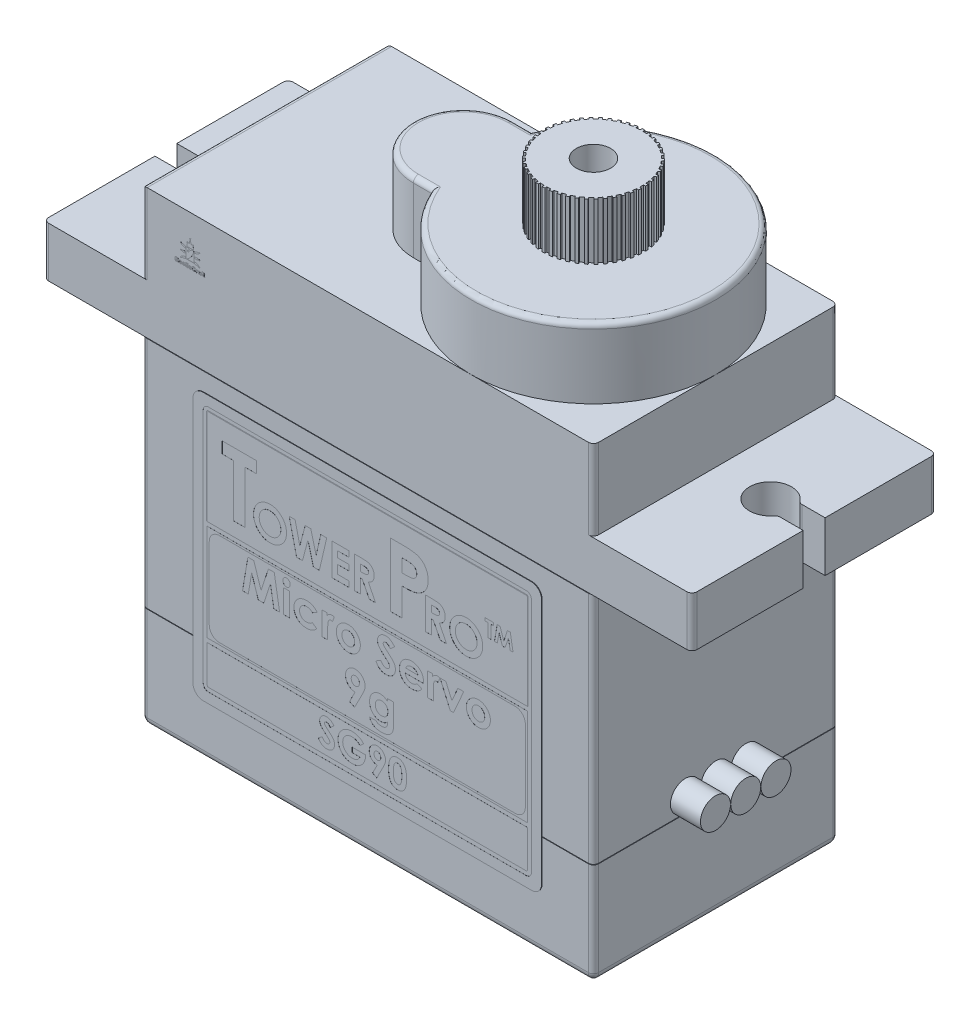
SolidWorks part; units mm, degrees
ref_plane "Alzado" through (0, 0, 0) normal (0, 0, 1) x (1, 0, 0)
ref_plane "Planta" through (0, 0, 0) normal (0, 1, 0) x (1, 0, 0)
ref_plane "Vista lateral" through (0, 0, 0) normal (1, 0, 0) x (0, 0, -1)
imported_body "Sólido importado3"
sketch "Croquis1" plane through (-22.0218, 0, 0) normal (-1, 0, 0) x (0, 0, 1)
  line L0 (0, -20.76) -> (0, -18.22)
  line L1 (0, -18.22) -> (12.2, -18.22)
  line L2 (12.2, -18.22) -> (12.2, -20.76)
  line L3 (12.2, -20.76) -> (0, -20.76)
extrude "Saliente-Extruir1" add sketch "Croquis1" along normal blind 0.508
sketch "Croquis2" plane through (-0.508, 0, 0) normal (1, 0, 0) x (0, 0, -1)
  line L0 (-12.2, -20.76) -> (-12.2, -18.22)
  line L1 (-12.2, -18.22) -> (0, -18.22)
  line L2 (0, -18.22) -> (0, -20.76)
  line L3 (0, -20.76) -> (-12.2, -20.76)
extrude "Saliente-Extruir2" add sketch "Croquis2" along normal blind 0.508
sketch "Croquis3" plane through (0, -20.76, 0) normal (0, -1, 0) x (1, 0, 0)
  line L0 (0, 0) -> (-22.5298, 0)
  line L1 (-22.5298, 0) -> (-22.5298, 12.2)
  line L2 (-22.5298, 12.2) -> (0, 12.2)
  line L3 (0, 12.2) -> (0, 0)
extrude "Saliente-Extruir3" add sketch "Croquis3" along normal blind 2.54
sketch "Croquis4" plane through (0, 0, 12.2254) normal (0, 0, 1) x (1, 0, 0)
  line L0 (-13.1091, -18.7413) -> (-12.9316, -18.5788)
  line L1 (-13.5029, -19.3519) -> (-13.7118, -19.4772)
  spline S0 degree 3 poles (-13.2968, -18.3682) (-13.2812, -18.3687) (-13.2501, -18.3699) (-13.2042, -18.3788) (-13.1594, -18.3927) (-13.1232, -18.4096) (-13.0945, -18.4259) (-13.0725, -18.4409) (-13.05, -18.4581) (-13.027, -18.4776) (-13.0039, -18.4997) (-12.98, -18.5238) (-12.9556, -18.5503) (-12.9397, -18.5691) (-12.9316, -18.5788) knots 0 0 0 0 0.10691 0.212977 0.319777 0.428556 0.485857 0.546559 0.611431 0.679821 0.753159 0.830753 0.913133 1 1 1 1
  spline S1 degree 3 poles (-13.6439, -18.7037) (-13.6436, -18.6923) (-13.6431, -18.67) (-13.638, -18.6372) (-13.6305, -18.6056) (-13.6196, -18.5752) (-13.6053, -18.5461) (-13.5881, -18.5182) (-13.5675, -18.4916) (-13.5444, -18.4666) (-13.5188, -18.4437) (-13.4915, -18.4234) (-13.4626, -18.4064) (-13.4323, -18.3922) (-13.4004, -18.3814) (-13.3671, -18.3737) (-13.3324, -18.3691) (-13.3088, -18.3685) (-13.2968, -18.3682) knots 0 0 0 0 0.063173 0.124457 0.184841 0.244567 0.304319 0.3652 0.427421 0.491262 0.555499 0.618605 0.680495 0.742473 0.804991 0.868252 0.932887 1 1 1 1
  spline S2 degree 3 poles (-13.3106, -19.168) (-13.3274, -19.1537) (-13.3597, -19.1264) (-13.4054, -19.086) (-13.4465, -19.0482) (-13.4828, -19.0127) (-13.5147, -18.9799) (-13.5419, -18.9498) (-13.5642, -18.9219) (-13.5877, -18.8889) (-13.61, -18.8488) (-13.6293, -18.8004) (-13.6418, -18.7521) (-13.6432, -18.7196) (-13.6439, -18.7037) knots 0 0 0 0 0.112125 0.215201 0.309902 0.395959 0.473447 0.54214 0.602523 0.654726 0.747804 0.835278 0.918925 1 1 1 1
  spline S3 degree 3 poles (-13.1351, -19.3961) (-13.1356, -19.3886) (-13.1364, -19.3732) (-13.143, -19.3504) (-13.1531, -19.3277) (-13.1652, -19.309) (-13.1775, -19.2933) (-13.1892, -19.2797) (-13.2035, -19.2648) (-13.2203, -19.2483) (-13.2394, -19.2303) (-13.2608, -19.2107) (-13.2848, -19.1897) (-13.3017, -19.1754) (-13.3106, -19.168) knots 0 0 0 0 0.076347 0.155091 0.238352 0.328404 0.379384 0.439618 0.509831 0.588875 0.677436 0.775547 0.882636 1 1 1 1
  spline S4 degree 3 poles (-13.2862, -19.5215) (-13.2759, -19.5211) (-13.2559, -19.5203) (-13.2274, -19.5128) (-13.2012, -19.5011) (-13.1787, -19.4844) (-13.1595, -19.4651) (-13.1454, -19.4436) (-13.1365, -19.4204) (-13.1356, -19.4042) (-13.1351, -19.3961) knots 0 0 0 0 0.141986 0.275473 0.404346 0.53543 0.661427 0.777867 0.88828 1 1 1 1
  spline S5 degree 3 poles (-13.5029, -19.3519) (-13.4952, -19.3653) (-13.4805, -19.391) (-13.4554, -19.4255) (-13.4297, -19.4551) (-13.4029, -19.4791) (-13.3751, -19.4981) (-13.3464, -19.5116) (-13.3166, -19.5199) (-13.2963, -19.521) (-13.2862, -19.5215) knots 0 0 0 0 0.160458 0.307612 0.442139 0.566229 0.681222 0.789558 0.895029 1 1 1 1
  spline S6 degree 3 poles (-13.2949, -19.7589) (-13.3062, -19.7587) (-13.3286, -19.7583) (-13.3617, -19.7551) (-13.3936, -19.7498) (-13.4243, -19.7423) (-13.454, -19.7328) (-13.4826, -19.7212) (-13.51, -19.7073) (-13.5365, -19.6914) (-13.5617, -19.6729) (-13.5861, -19.6523) (-13.6095, -19.6291) (-13.6319, -19.6035) (-13.6531, -19.5754) (-13.674, -19.5451) (-13.6935, -19.5121) (-13.7056, -19.489) (-13.7118, -19.4772) knots 0 0 0 0 0.063551 0.125868 0.18624 0.244977 0.303358 0.36123 0.418489 0.475937 0.534204 0.594059 0.655469 0.718772 0.784975 0.853522 0.925182 1 1 1 1
  spline S7 degree 3 poles (-12.8977, -19.3823) (-12.8979, -19.3957) (-12.8984, -19.4219) (-12.9041, -19.4603) (-12.9122, -19.497) (-12.9247, -19.5317) (-12.94, -19.5648) (-12.9592, -19.596) (-12.9817, -19.6256) (-13.0075, -19.6529) (-13.036, -19.6776) (-13.0667, -19.6997) (-13.0996, -19.7179) (-13.1347, -19.7329) (-13.1719, -19.7445) (-13.211, -19.753) (-13.2523, -19.7581) (-13.2805, -19.7586) (-13.2949, -19.7589) knots 0 0 0 0 0.065201 0.127927 0.189047 0.248544 0.307607 0.367248 0.426963 0.488617 0.550392 0.611331 0.672556 0.734024 0.797341 0.86225 0.929625 1 1 1 1
  spline S8 degree 3 poles (-13.0344, -19.0789) (-13.0227, -19.0916) (-13.0003, -19.1158) (-12.9711, -19.1535) (-12.9471, -19.1903) (-12.9285, -19.2268) (-12.9145, -19.2637) (-12.9046, -19.3018) (-12.8987, -19.3415) (-12.898, -19.3686) (-12.8977, -19.3823) knots 0 0 0 0 0.150833 0.289954 0.417139 0.535255 0.648751 0.762405 0.879827 1 1 1 1
  spline S9 degree 3 poles (-13.2048, -18.9263) (-13.1937, -18.9359) (-13.1726, -18.9542) (-13.1425, -18.9801) (-13.1161, -19.0035) (-13.093, -19.0238) (-13.0734, -19.0415) (-13.0574, -19.0565) (-13.0447, -19.0685) (-13.0375, -19.0758) (-13.0344, -19.0789) knots 0 0 0 0 0.192953 0.366184 0.520457 0.655012 0.770624 0.865677 0.942675 1 1 1 1
  spline S10 degree 3 poles (-13.3845, -18.7556) (-13.3814, -18.7594) (-13.3744, -18.7683) (-13.3611, -18.7823) (-13.3443, -18.7994) (-13.3235, -18.8192) (-13.2995, -18.8421) (-13.2711, -18.8675) (-13.2393, -18.896) (-13.2167, -18.9159) (-13.2048, -18.9263) knots 0 0 0 0 0.059234 0.136349 0.233805 0.349411 0.483179 0.635967 0.809243 1 1 1 1
  spline S11 degree 3 poles (-13.4065, -18.6923) (-13.4063, -18.6978) (-13.4058, -18.7089) (-13.4012, -18.7251) (-13.3944, -18.741) (-13.3878, -18.7507) (-13.3845, -18.7556) knots 0 0 0 0 0.241881 0.487115 0.737838 1 1 1 1
  spline S12 degree 3 poles (-13.2994, -18.6056) (-13.307, -18.6059) (-13.3215, -18.6064) (-13.3423, -18.6115) (-13.3607, -18.6202) (-13.3767, -18.6317) (-13.3895, -18.6454) (-13.3996, -18.6599) (-13.4054, -18.6759) (-13.4061, -18.6868) (-13.4065, -18.6923) knots 0 0 0 0 0.148126 0.285993 0.416634 0.54738 0.671583 0.784401 0.893266 1 1 1 1
  spline S13 degree 3 poles (-13.1091, -18.7413) (-13.1168, -18.7306) (-13.1314, -18.71) (-13.155, -18.6824) (-13.1786, -18.6589) (-13.2023, -18.6395) (-13.2263, -18.6244) (-13.2505, -18.6137) (-13.2749, -18.6069) (-13.2913, -18.606) (-13.2994, -18.6056) knots 0 0 0 0 0.16242 0.311824 0.448433 0.573381 0.689077 0.797573 0.900293 1 1 1 1
extrude "Cortar-Extruir1" cut sketch "Croquis4" against normal blind 0.0025
sketch "Croquis5" plane through (0, 0, -0.0254) normal (0, 0, -1) x (-1, 0, 0)
  line L0 (9.4207, -18.7413) -> (9.5982, -18.5788)
  line L1 (9.0269, -19.3519) -> (8.818, -19.4772)
  spline S0 degree 3 poles (9.233, -18.3682) (9.2486, -18.3687) (9.2797, -18.3699) (9.3256, -18.3788) (9.3704, -18.3927) (9.4066, -18.4096) (9.4353, -18.4259) (9.4573, -18.4409) (9.4798, -18.4581) (9.5028, -18.4776) (9.5259, -18.4997) (9.5498, -18.5238) (9.5742, -18.5503) (9.5901, -18.5691) (9.5982, -18.5788) knots 0 0 0 0 0.10691 0.212977 0.319777 0.428556 0.485857 0.546559 0.611431 0.679821 0.753159 0.830753 0.913133 1 1 1 1
  spline S1 degree 3 poles (8.8859, -18.7037) (8.8862, -18.6923) (8.8867, -18.67) (8.8918, -18.6372) (8.8993, -18.6056) (8.9102, -18.5752) (8.9245, -18.5461) (8.9417, -18.5182) (8.9623, -18.4916) (8.9854, -18.4666) (9.011, -18.4437) (9.0383, -18.4234) (9.0672, -18.4064) (9.0975, -18.3922) (9.1294, -18.3814) (9.1627, -18.3737) (9.1974, -18.3691) (9.221, -18.3685) (9.233, -18.3682) knots 0 0 0 0 0.063173 0.124457 0.184841 0.244567 0.304319 0.3652 0.427421 0.491262 0.555499 0.618605 0.680495 0.742473 0.804991 0.868252 0.932887 1 1 1 1
  spline S2 degree 3 poles (9.2192, -19.168) (9.2024, -19.1537) (9.1701, -19.1264) (9.1244, -19.086) (9.0833, -19.0482) (9.047, -19.0127) (9.0151, -18.9799) (8.9879, -18.9498) (8.9656, -18.9219) (8.9421, -18.8889) (8.9198, -18.8488) (8.9005, -18.8004) (8.888, -18.7521) (8.8866, -18.7196) (8.8859, -18.7037) knots 0 0 0 0 0.112125 0.215201 0.309902 0.395959 0.473447 0.54214 0.602523 0.654726 0.747804 0.835278 0.918925 1 1 1 1
  spline S3 degree 3 poles (9.3947, -19.3961) (9.3942, -19.3886) (9.3934, -19.3732) (9.3868, -19.3504) (9.3767, -19.3277) (9.3646, -19.309) (9.3523, -19.2933) (9.3406, -19.2797) (9.3263, -19.2648) (9.3095, -19.2483) (9.2904, -19.2303) (9.269, -19.2107) (9.245, -19.1897) (9.2281, -19.1754) (9.2192, -19.168) knots 0 0 0 0 0.076347 0.155091 0.238352 0.328404 0.379384 0.439618 0.509831 0.588875 0.677436 0.775547 0.882636 1 1 1 1
  spline S4 degree 3 poles (9.2436, -19.5215) (9.2539, -19.5211) (9.2739, -19.5203) (9.3024, -19.5128) (9.3286, -19.5011) (9.3511, -19.4844) (9.3703, -19.4651) (9.3844, -19.4436) (9.3933, -19.4204) (9.3942, -19.4042) (9.3947, -19.3961) knots 0 0 0 0 0.141986 0.275473 0.404346 0.53543 0.661427 0.777867 0.88828 1 1 1 1
  spline S5 degree 3 poles (9.0269, -19.3519) (9.0346, -19.3653) (9.0493, -19.391) (9.0744, -19.4255) (9.1001, -19.4551) (9.1269, -19.4791) (9.1547, -19.4981) (9.1834, -19.5116) (9.2132, -19.5199) (9.2335, -19.521) (9.2436, -19.5215) knots 0 0 0 0 0.160458 0.307612 0.442139 0.566229 0.681222 0.789558 0.895029 1 1 1 1
  spline S6 degree 3 poles (9.2349, -19.7589) (9.2236, -19.7587) (9.2012, -19.7583) (9.1681, -19.7551) (9.1362, -19.7498) (9.1055, -19.7423) (9.0758, -19.7328) (9.0472, -19.7212) (9.0198, -19.7073) (8.9933, -19.6914) (8.9681, -19.6729) (8.9437, -19.6523) (8.9203, -19.6291) (8.8979, -19.6035) (8.8767, -19.5754) (8.8558, -19.5451) (8.8363, -19.5121) (8.8242, -19.489) (8.818, -19.4772) knots 0 0 0 0 0.063551 0.125868 0.18624 0.244977 0.303358 0.36123 0.418489 0.475937 0.534204 0.594059 0.655469 0.718772 0.784975 0.853522 0.925182 1 1 1 1
  spline S7 degree 3 poles (9.6321, -19.3823) (9.6319, -19.3957) (9.6314, -19.4219) (9.6257, -19.4603) (9.6176, -19.497) (9.6051, -19.5317) (9.5898, -19.5648) (9.5706, -19.596) (9.5481, -19.6256) (9.5223, -19.6529) (9.4938, -19.6776) (9.4631, -19.6997) (9.4302, -19.7179) (9.3951, -19.7329) (9.3579, -19.7445) (9.3188, -19.753) (9.2775, -19.7581) (9.2493, -19.7586) (9.2349, -19.7589) knots 0 0 0 0 0.065201 0.127927 0.189047 0.248544 0.307607 0.367248 0.426963 0.488617 0.550392 0.611331 0.672556 0.734024 0.797341 0.86225 0.929625 1 1 1 1
  spline S8 degree 3 poles (9.4954, -19.0789) (9.5071, -19.0916) (9.5295, -19.1158) (9.5587, -19.1535) (9.5827, -19.1903) (9.6013, -19.2268) (9.6153, -19.2637) (9.6252, -19.3018) (9.6311, -19.3415) (9.6318, -19.3686) (9.6321, -19.3823) knots 0 0 0 0 0.150833 0.289954 0.417139 0.535255 0.648751 0.762405 0.879827 1 1 1 1
  spline S9 degree 3 poles (9.325, -18.9263) (9.3361, -18.9359) (9.3572, -18.9542) (9.3873, -18.9801) (9.4137, -19.0035) (9.4368, -19.0238) (9.4564, -19.0415) (9.4724, -19.0565) (9.4851, -19.0685) (9.4923, -19.0758) (9.4954, -19.0789) knots 0 0 0 0 0.192953 0.366184 0.520457 0.655012 0.770624 0.865677 0.942675 1 1 1 1
  spline S10 degree 3 poles (9.1453, -18.7556) (9.1484, -18.7594) (9.1554, -18.7683) (9.1687, -18.7823) (9.1855, -18.7994) (9.2063, -18.8192) (9.2303, -18.8421) (9.2587, -18.8675) (9.2905, -18.896) (9.3131, -18.9159) (9.325, -18.9263) knots 0 0 0 0 0.059234 0.136349 0.233805 0.349411 0.483179 0.635967 0.809243 1 1 1 1
  spline S11 degree 3 poles (9.1233, -18.6923) (9.1235, -18.6978) (9.124, -18.7089) (9.1286, -18.7251) (9.1354, -18.741) (9.142, -18.7507) (9.1453, -18.7556) knots 0 0 0 0 0.241881 0.487115 0.737838 1 1 1 1
  spline S12 degree 3 poles (9.2304, -18.6056) (9.2228, -18.6059) (9.2083, -18.6064) (9.1875, -18.6115) (9.1691, -18.6202) (9.1531, -18.6317) (9.1403, -18.6454) (9.1302, -18.6599) (9.1244, -18.6759) (9.1237, -18.6868) (9.1233, -18.6923) knots 0 0 0 0 0.148126 0.285993 0.416634 0.54738 0.671583 0.784401 0.893266 1 1 1 1
  spline S13 degree 3 poles (9.4207, -18.7413) (9.413, -18.7306) (9.3984, -18.71) (9.3748, -18.6824) (9.3512, -18.6589) (9.3275, -18.6395) (9.3035, -18.6244) (9.2793, -18.6137) (9.2549, -18.6069) (9.2385, -18.606) (9.2304, -18.6056) knots 0 0 0 0 0.16242 0.311824 0.448433 0.573381 0.689077 0.797573 0.900293 1 1 1 1
extrude "Cortar-Extruir2" cut sketch "Croquis5" against normal blind 0.0025
sketch "Croquis6" plane through (0, 0, 0) normal (0, 1, 0) x (-1, 0, 0)
  line L0 (11.669, 8.5892) -> (12.5984, 8.5892)
  line L1 (12.5984, 3.6108) -> (11.669, 3.6108)
  arc A0 (12.5984, 8.5892) -> (12.5984, 3.6108) centre (12.5984, 6.1) cw
  arc A1 (11.669, 3.6108) -> (11.669, 8.5892) centre (6.1, 6.1) cw
extrude "Saliente-Extruir4" add sketch "Croquis6" along normal blind 3.4843
sketch "Croquis7" plane through (0, 0, 12.2254) normal (0, 0, 1) x (1, 0, 0)
  spline S0 degree 3 poles (-6.3242, -10.5968) (-6.2966, -10.5975) (-6.2421, -10.5989) (-6.1619, -10.6107) (-6.0847, -10.6298) (-6.0104, -10.6565) (-5.9393, -10.6913) (-5.871, -10.7334) (-5.8059, -10.7834) (-5.7445, -10.8403) (-5.6878, -10.9021) (-5.6387, -10.9687) (-5.5968, -11.0383) (-5.5621, -11.1111) (-5.5356, -11.1877) (-5.5171, -11.2675) (-5.5051, -11.3506) (-5.5038, -11.4073) (-5.5031, -11.436) knots 0 0 0 0 0.063396 0.125157 0.185649 0.245977 0.306108 0.367351 0.429902 0.49454 0.559373 0.62241 0.684357 0.745807 0.80743 0.869996 0.933928 1 1 1 1
  spline S1 degree 3 poles (-7.1516, -11.4306) (-7.1514, -11.4118) (-7.1509, -11.3745) (-7.1451, -11.3192) (-7.1368, -11.265) (-7.1244, -11.2121) (-7.1094, -11.1601) (-7.09, -11.1095) (-7.0679, -11.0597) (-7.0421, -11.0114) (-7.0133, -10.9651) (-6.982, -10.9208) (-6.9479, -10.8792) (-6.9113, -10.8399) (-6.872, -10.8033) (-6.8305, -10.7689) (-6.7859, -10.7374) (-6.7394, -10.7082) (-6.6911, -10.6818) (-6.6412, -10.6594) (-6.5908, -10.6398) (-6.5391, -10.6243) (-6.4868, -10.6117) (-6.4333, -10.6033) (-6.3791, -10.5975) (-6.3425, -10.597) (-6.3242, -10.5968) knots 0 0 0 0 0.043114 0.085683 0.127594 0.169059 0.210432 0.251811 0.293444 0.335381 0.377477 0.418688 0.459873 0.500873 0.541873 0.583212 0.624763 0.666988 0.70937 0.751103 0.792568 0.833545 0.874827 0.916018 0.957859 1 1 1 1
  spline S2 degree 3 poles (-6.3219, -12.2657) (-6.3511, -12.265) (-6.4085, -12.2637) (-6.4925, -12.2514) (-6.5729, -12.2328) (-6.6491, -12.205) (-6.722, -12.1702) (-6.7908, -12.1274) (-6.8557, -12.0767) (-6.9163, -12.0192) (-6.9711, -11.9564) (-7.0196, -11.89) (-7.0604, -11.8205) (-7.0937, -11.748) (-7.1199, -11.6729) (-7.1384, -11.5947) (-7.1493, -11.5136) (-7.1508, -11.4585) (-7.1516, -11.4306) knots 0 0 0 0 0.066749 0.131152 0.193732 0.255326 0.316388 0.378027 0.440406 0.504557 0.568658 0.630986 0.692288 0.752615 0.8132 0.874016 0.936158 1 1 1 1
  spline S3 degree 3 poles (-5.5031, -11.436) (-5.5038, -11.4645) (-5.5053, -11.5205) (-5.5166, -11.6029) (-5.5354, -11.6819) (-5.5614, -11.7576) (-5.5955, -11.8299) (-5.6366, -11.899) (-5.6858, -11.9643) (-5.7412, -12.0259) (-5.8022, -12.0817) (-5.8668, -12.131) (-5.9348, -12.1727) (-6.0059, -12.2069) (-6.0804, -12.2334) (-6.1581, -12.2521) (-6.239, -12.2635) (-6.294, -12.265) (-6.3219, -12.2657) knots 0 0 0 0 0.065722 0.129508 0.191722 0.253161 0.314316 0.375952 0.43862 0.502973 0.567129 0.629552 0.690477 0.751072 0.811668 0.872929 0.935501 1 1 1 1
extrude "Cortar-Extruir3" cut sketch "Croquis7" against normal blind 0.0025
sketch "Croquis8" plane through (0, 0, 12.2229) normal (0, 0, 1) x (1, 0, 0)
  spline S0 degree 3 poles (-6.3229, -11.9808) (-6.3046, -11.9803) (-6.2687, -11.9793) (-6.2159, -11.9719) (-6.1654, -11.9593) (-6.1167, -11.9422) (-6.0701, -11.9198) (-6.0258, -11.8923) (-5.9836, -11.8599) (-5.9438, -11.8233) (-5.9074, -11.7829) (-5.8756, -11.7395) (-5.8482, -11.6941) (-5.8263, -11.6461) (-5.8089, -11.5959) (-5.7971, -11.5433) (-5.7894, -11.4885) (-5.7885, -11.4512) (-5.788, -11.4322) knots 0 0 0 0 0.064147 0.126212 0.186841 0.246936 0.307256 0.368151 0.430071 0.493875 0.557981 0.62087 0.682525 0.744036 0.805889 0.868968 0.933247 1 1 1 1
  spline S1 degree 3 poles (-6.6714, -11.8587) (-6.6586, -11.8684) (-6.6334, -11.8877) (-6.5931, -11.9125) (-6.5516, -11.9337) (-6.5085, -11.9508) (-6.4641, -11.9643) (-6.4182, -11.9738) (-6.371, -11.9797) (-6.339, -11.9804) (-6.3229, -11.9808) knots 0 0 0 0 0.127991 0.253098 0.376184 0.498936 0.621526 0.745707 0.871575 1 1 1 1
  spline S2 degree 3 poles (-6.8667, -11.4344) (-6.866, -11.4562) (-6.8648, -11.4988) (-6.8559, -11.561) (-6.8407, -11.6198) (-6.8187, -11.6748) (-6.7915, -11.7267) (-6.7576, -11.7748) (-6.7177, -11.8194) (-6.687, -11.8454) (-6.6714, -11.8587) knots 0 0 0 0 0.134807 0.264199 0.388462 0.509942 0.63041 0.750671 0.873455 1 1 1 1
  spline S3 degree 3 poles (-6.3286, -10.8817) (-6.3472, -10.8822) (-6.3838, -10.8832) (-6.4376, -10.8907) (-6.4892, -10.9027) (-6.5384, -10.92) (-6.5854, -10.9421) (-6.6302, -10.9688) (-6.6723, -11.0011) (-6.7122, -11.0372) (-6.7482, -11.0775) (-6.78, -11.1206) (-6.8066, -11.1665) (-6.8289, -11.2149) (-6.8457, -11.2661) (-6.8577, -11.3199) (-6.8652, -11.3763) (-6.8662, -11.4148) (-6.8667, -11.4344) knots 0 0 0 0 0.064609 0.127512 0.188521 0.248708 0.308598 0.368812 0.429888 0.492802 0.555743 0.617485 0.678969 0.740198 0.80236 0.866245 0.931707 1 1 1 1
  spline S4 degree 3 poles (-5.788, -11.4322) (-5.7885, -11.4133) (-5.7895, -11.3761) (-5.7969, -11.3215) (-5.8093, -11.2691) (-5.8266, -11.2189) (-5.8486, -11.1709) (-5.8758, -11.1252) (-5.9081, -11.0818) (-5.9448, -11.0412) (-5.9848, -11.0038) (-6.0277, -10.9713) (-6.0723, -10.9431) (-6.1197, -10.9211) (-6.1689, -10.9035) (-6.2201, -10.8905) (-6.2737, -10.8833) (-6.3101, -10.8822) (-6.3286, -10.8817) knots 0 0 0 0 0.065939 0.129791 0.192175 0.253617 0.314719 0.376282 0.438973 0.503175 0.567329 0.629651 0.69065 0.751238 0.811754 0.872788 0.93554 1 1 1 1
extrude "Saliente-Extruir5" add sketch "Croquis8" along normal blind 0.0025
sketch "Croquis9" plane through (0, 0, -0.0254) normal (0, 0, -1) x (-1, 0, 0)
  spline S0 degree 3 poles (16.2056, -10.5968) (16.2332, -10.5975) (16.2877, -10.5989) (16.3679, -10.6107) (16.4451, -10.6298) (16.5194, -10.6565) (16.5905, -10.6913) (16.6588, -10.7334) (16.7239, -10.7834) (16.7853, -10.8403) (16.842, -10.9021) (16.8911, -10.9687) (16.933, -11.0383) (16.9677, -11.1111) (16.9942, -11.1877) (17.0127, -11.2675) (17.0247, -11.3506) (17.026, -11.4073) (17.0267, -11.436) knots 0 0 0 0 0.063396 0.125157 0.185649 0.245977 0.306108 0.367351 0.429902 0.49454 0.559373 0.62241 0.684357 0.745807 0.80743 0.869996 0.933928 1 1 1 1
  spline S1 degree 3 poles (15.3782, -11.4306) (15.3784, -11.4118) (15.3789, -11.3745) (15.3847, -11.3192) (15.393, -11.265) (15.4054, -11.2121) (15.4204, -11.1601) (15.4398, -11.1095) (15.4619, -11.0597) (15.4877, -11.0114) (15.5165, -10.9651) (15.5478, -10.9208) (15.5819, -10.8792) (15.6185, -10.8399) (15.6578, -10.8033) (15.6993, -10.7689) (15.7439, -10.7374) (15.7904, -10.7082) (15.8387, -10.6818) (15.8886, -10.6594) (15.939, -10.6398) (15.9907, -10.6243) (16.043, -10.6117) (16.0965, -10.6033) (16.1507, -10.5975) (16.1873, -10.597) (16.2056, -10.5968) knots 0 0 0 0 0.043114 0.085683 0.127594 0.169059 0.210432 0.251811 0.293444 0.335381 0.377477 0.418688 0.459873 0.500873 0.541873 0.583212 0.624763 0.666988 0.70937 0.751103 0.792568 0.833545 0.874827 0.916018 0.957859 1 1 1 1
  spline S2 degree 3 poles (16.2079, -12.2657) (16.1787, -12.265) (16.1213, -12.2637) (16.0373, -12.2514) (15.9569, -12.2328) (15.8807, -12.205) (15.8078, -12.1702) (15.739, -12.1274) (15.6741, -12.0767) (15.6135, -12.0192) (15.5587, -11.9564) (15.5102, -11.89) (15.4694, -11.8205) (15.4361, -11.748) (15.4099, -11.6729) (15.3914, -11.5947) (15.3805, -11.5136) (15.379, -11.4585) (15.3782, -11.4306) knots 0 0 0 0 0.066749 0.131152 0.193732 0.255326 0.316388 0.378027 0.440406 0.504557 0.568658 0.630986 0.692288 0.752615 0.8132 0.874016 0.936158 1 1 1 1
  spline S3 degree 3 poles (17.0267, -11.436) (17.026, -11.4645) (17.0245, -11.5205) (17.0132, -11.6029) (16.9944, -11.6819) (16.9684, -11.7576) (16.9343, -11.8299) (16.8932, -11.899) (16.844, -11.9643) (16.7886, -12.0259) (16.7276, -12.0817) (16.663, -12.131) (16.595, -12.1727) (16.5239, -12.2069) (16.4494, -12.2334) (16.3717, -12.2521) (16.2908, -12.2635) (16.2358, -12.265) (16.2079, -12.2657) knots 0 0 0 0 0.065722 0.129508 0.191722 0.253161 0.314316 0.375952 0.43862 0.502973 0.567129 0.629552 0.690477 0.751072 0.811668 0.872929 0.935501 1 1 1 1
extrude "Cortar-Extruir4" cut sketch "Croquis9" against normal blind 0.0025
sketch "Croquis10" plane through (0, 0, -0.0229) normal (0, 0, -1) x (-1, 0, 0)
  spline S0 degree 3 poles (16.2069, -11.9808) (16.2252, -11.9803) (16.2611, -11.9793) (16.3139, -11.9719) (16.3644, -11.9593) (16.4131, -11.9422) (16.4597, -11.9198) (16.504, -11.8923) (16.5462, -11.8599) (16.586, -11.8233) (16.6224, -11.7829) (16.6542, -11.7395) (16.6816, -11.6941) (16.7035, -11.6461) (16.7209, -11.5959) (16.7327, -11.5433) (16.7404, -11.4885) (16.7413, -11.4512) (16.7418, -11.4322) knots 0 0 0 0 0.064147 0.126212 0.186841 0.246936 0.307256 0.368151 0.430071 0.493875 0.557981 0.62087 0.682525 0.744036 0.805889 0.868968 0.933247 1 1 1 1
  spline S1 degree 3 poles (15.8584, -11.8587) (15.8712, -11.8684) (15.8964, -11.8877) (15.9367, -11.9125) (15.9782, -11.9337) (16.0213, -11.9508) (16.0657, -11.9643) (16.1116, -11.9738) (16.1588, -11.9797) (16.1908, -11.9804) (16.2069, -11.9808) knots 0 0 0 0 0.127991 0.253098 0.376184 0.498936 0.621526 0.745707 0.871575 1 1 1 1
  spline S2 degree 3 poles (15.6631, -11.4344) (15.6638, -11.4562) (15.665, -11.4988) (15.6739, -11.561) (15.6891, -11.6198) (15.7111, -11.6748) (15.7383, -11.7267) (15.7722, -11.7748) (15.8121, -11.8194) (15.8428, -11.8454) (15.8584, -11.8587) knots 0 0 0 0 0.134807 0.264199 0.388462 0.509942 0.63041 0.750671 0.873455 1 1 1 1
  spline S3 degree 3 poles (16.2012, -10.8817) (16.1826, -10.8822) (16.146, -10.8832) (16.0922, -10.8907) (16.0406, -10.9027) (15.9914, -10.92) (15.9444, -10.9421) (15.8996, -10.9688) (15.8575, -11.0011) (15.8176, -11.0372) (15.7816, -11.0775) (15.7498, -11.1206) (15.7232, -11.1665) (15.7009, -11.2149) (15.6841, -11.2661) (15.6721, -11.3199) (15.6646, -11.3763) (15.6636, -11.4148) (15.6631, -11.4344) knots 0 0 0 0 0.064609 0.127512 0.188521 0.248708 0.308598 0.368812 0.429888 0.492802 0.555743 0.617485 0.678969 0.740198 0.80236 0.866245 0.931707 1 1 1 1
  spline S4 degree 3 poles (16.7418, -11.4322) (16.7413, -11.4133) (16.7403, -11.3761) (16.7329, -11.3215) (16.7205, -11.2691) (16.7032, -11.2189) (16.6812, -11.1709) (16.654, -11.1252) (16.6217, -11.0818) (16.585, -11.0412) (16.545, -11.0038) (16.5021, -10.9713) (16.4575, -10.9431) (16.4101, -10.9211) (16.3609, -10.9035) (16.3097, -10.8905) (16.2561, -10.8833) (16.2197, -10.8822) (16.2012, -10.8817) knots 0 0 0 0 0.065939 0.129791 0.192175 0.253617 0.314719 0.376282 0.438973 0.503175 0.567329 0.629651 0.69065 0.751238 0.811754 0.872788 0.93554 1 1 1 1
extrude "Saliente-Extruir6" add sketch "Croquis10" along normal blind 0.0025
sketch "Croquis11" plane through (0, 0, 12.2) normal (0, 0, 1) x (1, 0, 0)
  line L0 (-22.5298, -4) -> (-22.5298, 0)
  line L1 (-22.5298, 0) -> (-27.4447, 0)
  line L2 (-27.4447, 0) -> (-27.4447, -4)
  line L3 (-27.4447, -4) -> (-22.5298, -4)
extrude "Cortar-Extruir5" cut sketch "Croquis11" against normal through all
sketch "Croquis12" plane through (0, -4, 0) normal (0, 1, 0) x (-1, 0, 0)
  line L0 (27.4447, 6.6461) -> (26.1608, 6.6461)
  line L1 (26.1608, 5.5539) -> (27.4447, 5.5539)
  line L2 (27.4447, 5.5539) -> (27.4447, 6.6461)
  arc A0 (26.1608, 6.6461) -> (26.1608, 5.5539) centre (25.2667, 6.1) cw
extrude "Cortar-Extruir6" cut sketch "Croquis12" against normal through all
sketch "Croquis13" plane through (0, 0, 12.2) normal (0, 0, 1) x (1, 0, 0)
  line L0 (4.9149, 0) -> (0, 0)
  line L1 (0, 0) -> (0, -4)
  line L2 (0, -4) -> (4.9149, -4)
  line L3 (4.9149, -4) -> (4.9149, 0)
extrude "Cortar-Extruir7" cut sketch "Croquis13" against normal through all
sketch "Croquis14" plane through (0, -4, 0) normal (0, 1, 0) x (-1, 0, 0)
  line L0 (-4.9149, 5.5539) -> (-3.631, 5.5539)
  line L1 (-3.631, 6.6461) -> (-4.9149, 6.6461)
  line L2 (-4.9149, 6.6461) -> (-4.9149, 5.5539)
  arc A0 (-3.631, 5.5539) -> (-3.631, 6.6461) centre (-2.7369, 6.1) cw
extrude "Cortar-Extruir8" cut sketch "Croquis14" against normal through all
sketch "Croquis15" plane through (0, 3.4843, 0) normal (0, 1, 0) x (-1, 0, 0)
  line L0 (6.03, 3.601) -> (6.03, 3.7)
  line L1 (6.03, 3.7) -> (5.8425, 3.7128)
  line L2 (5.8425, 3.7128) -> (5.8291, 3.6147)
  line L3 (5.6904, 3.6338) -> (5.7039, 3.7319)
  line L4 (5.7039, 3.7319) -> (5.5199, 3.7701)
  line L5 (5.5199, 3.7701) -> (5.4932, 3.6748)
  line L6 (5.3584, 3.7125) -> (5.3851, 3.8079)
  line L7 (5.3851, 3.8079) -> (5.208, 3.8708)
  line L8 (5.208, 3.8708) -> (5.1686, 3.78)
  line L9 (5.0402, 3.8358) -> (5.0796, 3.9266)
  line L10 (5.0796, 3.9266) -> (4.9128, 4.013)
  line L11 (4.9128, 4.013) -> (4.8614, 3.9284)
  line L12 (4.7417, 4.0012) -> (4.7932, 4.0858)
  line L13 (4.7932, 4.0858) -> (4.6397, 4.1941)
  line L14 (4.6397, 4.1941) -> (4.5772, 4.1173)
  line L15 (4.4686, 4.2057) -> (4.5311, 4.2825)
  line L16 (4.5311, 4.2825) -> (4.3938, 4.4107)
  line L17 (4.3938, 4.4107) -> (4.3214, 4.3431)
  line L18 (4.2258, 4.4454) -> (4.2982, 4.513)
  line L19 (4.2982, 4.513) -> (4.1796, 4.6588)
  line L20 (4.1796, 4.6588) -> (4.0987, 4.6017)
  line L21 (4.018, 4.7161) -> (4.0989, 4.7732)
  line L22 (4.0989, 4.7732) -> (4.0013, 4.9337)
  line L23 (4.0013, 4.9337) -> (3.9134, 4.8881)
  line L24 (3.849, 5.0124) -> (3.9369, 5.058)
  line L25 (3.9369, 5.058) -> (3.862, 5.2303)
  line L26 (3.862, 5.2303) -> (3.7687, 5.1972)
  line L27 (3.7218, 5.3291) -> (3.8151, 5.3622)
  line L28 (3.8151, 5.3622) -> (3.7644, 5.5432)
  line L29 (3.7644, 5.5432) -> (3.6675, 5.523)
  line L30 (3.639, 5.6601) -> (3.736, 5.6802)
  line L31 (3.736, 5.6802) -> (3.7104, 5.8664)
  line L32 (3.7104, 5.8664) -> (3.6116, 5.8596)
  line L33 (3.602, 5.9993) -> (3.7008, 6.0061)
  line L34 (3.7008, 6.0061) -> (3.7008, 6.1939)
  line L35 (3.7008, 6.1939) -> (3.602, 6.2007)
  line L36 (3.6116, 6.3404) -> (3.7104, 6.3336)
  line L37 (3.7104, 6.3336) -> (3.736, 6.5198)
  line L38 (3.736, 6.5198) -> (3.639, 6.5399)
  line L39 (3.6675, 6.677) -> (3.7644, 6.6568)
  line L40 (3.7644, 6.6568) -> (3.8151, 6.8378)
  line L41 (3.8151, 6.8378) -> (3.7218, 6.8709)
  line L42 (3.7687, 7.0028) -> (3.862, 6.9697)
  line L43 (3.862, 6.9697) -> (3.9369, 7.142)
  line L44 (3.9369, 7.142) -> (3.849, 7.1876)
  line L45 (3.9134, 7.3119) -> (4.0013, 7.2663)
  line L46 (4.0013, 7.2663) -> (4.0989, 7.4268)
  line L47 (4.0989, 7.4268) -> (4.018, 7.4839)
  line L48 (4.0987, 7.5983) -> (4.1796, 7.5412)
  line L49 (4.1796, 7.5412) -> (4.2982, 7.687)
  line L50 (4.2982, 7.687) -> (4.2258, 7.7546)
  line L51 (4.3214, 7.8569) -> (4.3938, 7.7893)
  line L52 (4.3938, 7.7893) -> (4.5311, 7.9175)
  line L53 (4.5311, 7.9175) -> (4.4686, 7.9943)
  line L54 (4.5772, 8.0827) -> (4.6397, 8.0059)
  line L55 (4.6397, 8.0059) -> (4.7932, 8.1142)
  line L56 (4.7932, 8.1142) -> (4.7417, 8.1988)
  line L57 (4.8614, 8.2716) -> (4.9128, 8.187)
  line L58 (4.9128, 8.187) -> (5.0796, 8.2734)
  line L59 (5.0796, 8.2734) -> (5.0402, 8.3642)
  line L60 (5.1686, 8.42) -> (5.208, 8.3292)
  line L61 (5.208, 8.3292) -> (5.3851, 8.3921)
  line L62 (5.3851, 8.3921) -> (5.3584, 8.4875)
  line L63 (5.4932, 8.5252) -> (5.5199, 8.4299)
  line L64 (5.5199, 8.4299) -> (5.7039, 8.4681)
  line L65 (5.7039, 8.4681) -> (5.6904, 8.5662)
  line L66 (5.8291, 8.5853) -> (5.8425, 8.4872)
  line L67 (5.8425, 8.4872) -> (6.03, 8.5)
  line L68 (6.03, 8.5) -> (6.03, 8.599)
  line L69 (6.17, 8.599) -> (6.17, 8.5)
  line L70 (6.17, 8.5) -> (6.3575, 8.4872)
  line L71 (6.3575, 8.4872) -> (6.3709, 8.5853)
  line L72 (6.5096, 8.5662) -> (6.4961, 8.4681)
  line L73 (6.4961, 8.4681) -> (6.6801, 8.4299)
  line L74 (6.6801, 8.4299) -> (6.7068, 8.5252)
  line L75 (6.8416, 8.4875) -> (6.8149, 8.3921)
  line L76 (6.8149, 8.3921) -> (6.992, 8.3292)
  line L77 (6.992, 8.3292) -> (7.0314, 8.42)
  line L78 (7.1598, 8.3642) -> (7.1204, 8.2734)
  line L79 (7.1204, 8.2734) -> (7.2872, 8.187)
  line L80 (7.2872, 8.187) -> (7.3386, 8.2716)
  line L81 (7.4583, 8.1988) -> (7.4068, 8.1142)
  line L82 (7.4068, 8.1142) -> (7.5603, 8.0059)
  line L83 (7.5603, 8.0059) -> (7.6228, 8.0827)
  line L84 (7.7314, 7.9943) -> (7.6689, 7.9175)
  line L85 (7.6689, 7.9175) -> (7.8062, 7.7893)
  line L86 (7.8062, 7.7893) -> (7.8786, 7.8569)
  line L87 (7.9742, 7.7546) -> (7.9018, 7.687)
  line L88 (7.9018, 7.687) -> (8.0204, 7.5412)
  line L89 (8.0204, 7.5412) -> (8.1013, 7.5983)
  line L90 (8.182, 7.4839) -> (8.1011, 7.4268)
  line L91 (8.1011, 7.4268) -> (8.1987, 7.2663)
  line L92 (8.1987, 7.2663) -> (8.2866, 7.3119)
  line L93 (8.351, 7.1876) -> (8.2631, 7.142)
  line L94 (8.2631, 7.142) -> (8.338, 6.9697)
  line L95 (8.338, 6.9697) -> (8.4313, 7.0028)
  line L96 (8.4782, 6.8709) -> (8.3849, 6.8378)
  line L97 (8.3849, 6.8378) -> (8.4356, 6.6568)
  line L98 (8.4356, 6.6568) -> (8.5325, 6.677)
  line L99 (8.561, 6.5399) -> (8.464, 6.5198)
  line L100 (8.464, 6.5198) -> (8.4896, 6.3336)
  line L101 (8.4896, 6.3336) -> (8.5884, 6.3404)
  line L102 (8.598, 6.2007) -> (8.4992, 6.1939)
  line L103 (8.4992, 6.1939) -> (8.4992, 6.0061)
  line L104 (8.4992, 6.0061) -> (8.598, 5.9993)
  line L105 (8.5884, 5.8596) -> (8.4896, 5.8664)
  line L106 (8.4896, 5.8664) -> (8.464, 5.6802)
  line L107 (8.464, 5.6802) -> (8.561, 5.6601)
  line L108 (8.5325, 5.523) -> (8.4356, 5.5432)
  line L109 (8.4356, 5.5432) -> (8.3849, 5.3622)
  line L110 (8.3849, 5.3622) -> (8.4782, 5.3291)
  line L111 (8.4313, 5.1972) -> (8.338, 5.2303)
  line L112 (8.338, 5.2303) -> (8.2631, 5.058)
  line L113 (8.2631, 5.058) -> (8.351, 5.0124)
  line L114 (8.2866, 4.8881) -> (8.1987, 4.9337)
  line L115 (8.1987, 4.9337) -> (8.1011, 4.7732)
  line L116 (8.1011, 4.7732) -> (8.182, 4.7161)
  line L117 (8.1013, 4.6017) -> (8.0204, 4.6588)
  line L118 (8.0204, 4.6588) -> (7.9018, 4.513)
  line L119 (7.9018, 4.513) -> (7.9742, 4.4454)
  line L120 (7.8786, 4.3431) -> (7.8062, 4.4107)
  line L121 (7.8062, 4.4107) -> (7.6689, 4.2825)
  line L122 (7.6689, 4.2825) -> (7.7314, 4.2057)
  line L123 (7.6228, 4.1173) -> (7.5603, 4.1941)
  line L124 (7.5603, 4.1941) -> (7.4068, 4.0858)
  line L125 (7.4068, 4.0858) -> (7.4583, 4.0012)
  line L126 (7.3386, 3.9284) -> (7.2872, 4.013)
  line L127 (7.2872, 4.013) -> (7.1204, 3.9266)
  line L128 (7.1204, 3.9266) -> (7.1598, 3.8358)
  line L129 (7.0314, 3.78) -> (6.992, 3.8708)
  line L130 (6.992, 3.8708) -> (6.8149, 3.8079)
  line L131 (6.8149, 3.8079) -> (6.8416, 3.7125)
  line L132 (6.7068, 3.6748) -> (6.6801, 3.7701)
  line L133 (6.6801, 3.7701) -> (6.4961, 3.7319)
  line L134 (6.4961, 3.7319) -> (6.5096, 3.6338)
  line L135 (6.3709, 3.6147) -> (6.3575, 3.7128)
  line L136 (6.3575, 3.7128) -> (6.17, 3.7)
  line L137 (6.17, 3.7) -> (6.17, 3.601)
  arc A0 (6.17, 3.601) -> (6.03, 3.601) centre (6.1, 6.1) cw
  arc A1 (5.8291, 3.6147) -> (5.6904, 3.6338) centre (6.1, 6.1) cw
  arc A2 (5.4932, 3.6748) -> (5.3584, 3.7125) centre (6.1, 6.1) cw
  arc A3 (5.1686, 3.78) -> (5.0402, 3.8358) centre (6.1, 6.1) cw
  arc A4 (4.8614, 3.9284) -> (4.7417, 4.0012) centre (6.1, 6.1) cw
  arc A5 (4.5772, 4.1173) -> (4.4686, 4.2057) centre (6.1, 6.1) cw
  arc A6 (4.3214, 4.3431) -> (4.2258, 4.4454) centre (6.1, 6.1) cw
  arc A7 (4.0987, 4.6017) -> (4.018, 4.7161) centre (6.1, 6.1) cw
  arc A8 (3.9134, 4.8881) -> (3.849, 5.0124) centre (6.1, 6.1) cw
  arc A9 (3.7687, 5.1972) -> (3.7218, 5.3291) centre (6.1, 6.1) cw
  arc A10 (3.6675, 5.523) -> (3.639, 5.6601) centre (6.1, 6.1) cw
  arc A11 (3.6116, 5.8596) -> (3.602, 5.9993) centre (6.1, 6.1) cw
  arc A12 (3.602, 6.2007) -> (3.6116, 6.3404) centre (6.1, 6.1) cw
  arc A13 (3.639, 6.5399) -> (3.6675, 6.677) centre (6.1, 6.1) cw
  arc A14 (3.7218, 6.8709) -> (3.7687, 7.0028) centre (6.1, 6.1) cw
  arc A15 (3.849, 7.1876) -> (3.9134, 7.3119) centre (6.1, 6.1) cw
  arc A16 (4.018, 7.4839) -> (4.0987, 7.5983) centre (6.1, 6.1) cw
  arc A17 (4.2258, 7.7546) -> (4.3214, 7.8569) centre (6.1, 6.1) cw
  arc A18 (4.4686, 7.9943) -> (4.5772, 8.0827) centre (6.1, 6.1) cw
  arc A19 (4.7417, 8.1988) -> (4.8614, 8.2716) centre (6.1, 6.1) cw
  arc A20 (5.0402, 8.3642) -> (5.1686, 8.42) centre (6.1, 6.1) cw
  arc A21 (5.3584, 8.4875) -> (5.4932, 8.5252) centre (6.1, 6.1) cw
  arc A22 (5.6904, 8.5662) -> (5.8291, 8.5853) centre (6.1, 6.1) cw
  arc A23 (6.03, 8.599) -> (6.17, 8.599) centre (6.1, 6.1) cw
  arc A24 (6.3709, 8.5853) -> (6.5096, 8.5662) centre (6.1, 6.1) cw
  arc A25 (6.7068, 8.5252) -> (6.8416, 8.4875) centre (6.1, 6.1) cw
  arc A26 (7.0314, 8.42) -> (7.1598, 8.3642) centre (6.1, 6.1) cw
  arc A27 (7.3386, 8.2716) -> (7.4583, 8.1988) centre (6.1, 6.1) cw
  arc A28 (7.6228, 8.0827) -> (7.7314, 7.9943) centre (6.1, 6.1) cw
  arc A29 (7.8786, 7.8569) -> (7.9742, 7.7546) centre (6.1, 6.1) cw
  arc A30 (8.1013, 7.5983) -> (8.182, 7.4839) centre (6.1, 6.1) cw
  arc A31 (8.2866, 7.3119) -> (8.351, 7.1876) centre (6.1, 6.1) cw
  arc A32 (8.4313, 7.0028) -> (8.4782, 6.8709) centre (6.1, 6.1) cw
  arc A33 (8.5325, 6.677) -> (8.561, 6.5399) centre (6.1, 6.1) cw
  arc A34 (8.5884, 6.3404) -> (8.598, 6.2007) centre (6.1, 6.1) cw
  arc A35 (8.598, 5.9993) -> (8.5884, 5.8596) centre (6.1, 6.1) cw
  arc A36 (8.561, 5.6601) -> (8.5325, 5.523) centre (6.1, 6.1) cw
  arc A37 (8.4782, 5.3291) -> (8.4313, 5.1972) centre (6.1, 6.1) cw
  arc A38 (8.351, 5.0124) -> (8.2866, 4.8881) centre (6.1, 6.1) cw
  arc A39 (8.182, 4.7161) -> (8.1013, 4.6017) centre (6.1, 6.1) cw
  arc A40 (7.9742, 4.4454) -> (7.8786, 4.3431) centre (6.1, 6.1) cw
  arc A41 (7.7314, 4.2057) -> (7.6228, 4.1173) centre (6.1, 6.1) cw
  arc A42 (7.4583, 4.0012) -> (7.3386, 3.9284) centre (6.1, 6.1) cw
  arc A43 (7.1598, 3.8358) -> (7.0314, 3.78) centre (6.1, 6.1) cw
  arc A44 (6.8416, 3.7125) -> (6.7068, 3.6748) centre (6.1, 6.1) cw
  arc A45 (6.5096, 3.6338) -> (6.3709, 3.6147) centre (6.1, 6.1) cw
extrude "Saliente-Extruir7" add sketch "Croquis15" along normal blind 2.8194
sketch "Croquis16" plane through (0, 0, 12.2) normal (0, 0, 1) x (1, 0, 0)
  line L0 (-20.0931, -1.1075) -> (-20.1114, -1.1892)
  line L1 (-20.1114, -1.1892) -> (-20.0931, -1.357)
  line L2 (-20.0931, -1.357) -> (-20.0471, -1.357)
  line L3 (-20.0471, -1.357) -> (-20.019, -1.3772)
  line L4 (-20.019, -1.3772) -> (-19.9882, -1.3209)
  line L5 (-19.9882, -1.3209) -> (-19.9554, -1.3388)
  line L6 (-19.9554, -1.3388) -> (-19.9942, -1.41)
  line L7 (-19.9942, -1.41) -> (-19.9689, -1.4372)
  line L8 (-19.9689, -1.4372) -> (-19.9689, -1.5467)
  line L9 (-19.9689, -1.5467) -> (-20.2906, -1.5467)
  line L10 (-20.2906, -1.5467) -> (-20.2906, -1.4372)
  line L11 (-20.2906, -1.4372) -> (-20.2615, -1.41)
  line L12 (-20.2615, -1.41) -> (-20.2989, -1.3388)
  line L13 (-20.2989, -1.3388) -> (-20.2648, -1.3209)
  line L14 (-20.2648, -1.3209) -> (-20.2352, -1.3772)
  line L15 (-20.2352, -1.3772) -> (-20.2077, -1.357)
  line L16 (-20.2077, -1.357) -> (-20.1618, -1.357)
  line L17 (-20.1618, -1.357) -> (-20.1431, -1.1892)
  line L18 (-20.1431, -1.1892) -> (-20.167, -1.1075)
  line L19 (-20.167, -1.1075) -> (-20.1297, -1.1583)
  line L20 (-20.1297, -1.1583) -> (-20.0931, -1.1075)
extrude "Saliente-Extruir8" add sketch "Croquis16" along normal blind 0.001
sketch "Croquis17" plane through (0, 0, 12.2) normal (0, 0, 1) x (1, 0, 0)
  line L0 (-20.5006, -1.8031) -> (-20.3606, -1.8051)
  line L1 (-20.3606, -1.8051) -> (-20.3606, -1.8834)
  line L2 (-20.3606, -1.8834) -> (-20.5006, -1.8834)
  line L3 (-20.5006, -1.8834) -> (-20.5006, -1.8649)
  line L4 (-20.5006, -1.8649) -> (-20.6236, -1.8649)
  line L5 (-20.6236, -1.8649) -> (-20.6236, -1.8196)
  line L6 (-20.6236, -1.8196) -> (-20.5006, -1.8196)
  line L7 (-20.5006, -1.8196) -> (-20.5006, -1.8031)
extrude "Saliente-Extruir9" add sketch "Croquis17" along normal blind 0.001
sketch "Croquis18" plane through (0, 0, 12.2) normal (0, 0, 1) x (1, 0, 0)
  line L0 (-19.7643, -1.8196) -> (-19.646, -1.8196)
  line L1 (-19.646, -1.8196) -> (-19.646, -1.8649)
  line L2 (-19.646, -1.8649) -> (-19.7643, -1.8649)
  line L3 (-19.7643, -1.8649) -> (-19.7643, -1.8834)
  line L4 (-19.7643, -1.8834) -> (-19.9034, -1.8834)
  line L5 (-19.9034, -1.8834) -> (-19.9034, -1.8051)
  line L6 (-19.9034, -1.8051) -> (-19.7643, -1.8031)
  line L7 (-19.7643, -1.8031) -> (-19.7643, -1.8196)
extrude "Saliente-Extruir10" add sketch "Croquis18" along normal blind 0.001
sketch "Croquis19" plane through (0, 0, 12.2) normal (0, 0, 1) x (1, 0, 0)
  line L0 (-20.6236, -1.5313) -> (-20.5983, -1.4961)
  line L1 (-20.5983, -1.4961) -> (-20.5166, -1.5551)
  line L2 (-20.5166, -1.5551) -> (-20.4925, -1.5313)
  line L3 (-20.4925, -1.5313) -> (-20.3606, -1.579)
  line L4 (-20.3606, -1.579) -> (-20.3606, -1.6582)
  line L5 (-20.3606, -1.6582) -> (-20.5166, -1.6107)
  line L6 (-20.5166, -1.6107) -> (-20.6236, -1.5313)
extrude "Saliente-Extruir11" add sketch "Croquis19" along normal blind 0.001
sketch "Croquis20" plane through (0, 0, 12.2) normal (0, 0, 1) x (1, 0, 0)
  line L0 (-19.9034, -1.5855) -> (-19.7759, -1.5313)
  line L1 (-19.7759, -1.5313) -> (-19.7424, -1.5584)
  line L2 (-19.7424, -1.5584) -> (-19.6674, -1.4961)
  line L3 (-19.6674, -1.4961) -> (-19.6415, -1.5273)
  line L4 (-19.6415, -1.5273) -> (-19.7424, -1.611)
  line L5 (-19.7424, -1.611) -> (-19.9034, -1.6582)
  line L6 (-19.9034, -1.6582) -> (-19.9034, -1.5855)
extrude "Saliente-Extruir12" add sketch "Croquis20" along normal blind 0.001
sketch "Croquis21" plane through (0, 0, 12.2) normal (0, 0, 1) x (1, 0, 0)
  line L0 (-19.6415, -2.151) -> (-19.6674, -2.1845)
  line L1 (-19.6674, -2.1845) -> (-19.7424, -2.1267)
  line L2 (-19.7424, -2.1267) -> (-19.7759, -2.1489)
  line L3 (-19.7759, -2.1489) -> (-19.9034, -2.1045)
  line L4 (-19.9034, -2.1045) -> (-19.9034, -2.0212)
  line L5 (-19.9034, -2.0212) -> (-19.7524, -2.0629)
  line L6 (-19.7524, -2.0629) -> (-19.6415, -2.151)
extrude "Saliente-Extruir13" add sketch "Croquis21" along normal blind 0.001
sketch "Croquis22" plane through (0, 0, 12.2) normal (0, 0, 1) x (1, 0, 0)
  line L0 (-20.3606, -2.0212) -> (-20.3606, -2.1045)
  line L1 (-20.3606, -2.1045) -> (-20.4882, -2.1489)
  line L2 (-20.4882, -2.1489) -> (-20.5217, -2.1267)
  line L3 (-20.5217, -2.1267) -> (-20.5983, -2.1845)
  line L4 (-20.5983, -2.1845) -> (-20.6236, -2.1509)
  line L5 (-20.6236, -2.1509) -> (-20.5166, -2.07)
  line L6 (-20.5166, -2.07) -> (-20.3606, -2.0212)
extrude "Saliente-Extruir14" add sketch "Croquis22" along normal blind 0.001
sketch "Croquis23" plane through (0, 0, 12.2254) normal (0, 0, 1) x (1, 0, 0)
  spline S0 degree 3 poles (-16.1158, -10.5968) (-16.0882, -10.5975) (-16.0337, -10.5989) (-15.9535, -10.6107) (-15.8763, -10.6298) (-15.802, -10.6565) (-15.7309, -10.6913) (-15.6626, -10.7334) (-15.5975, -10.7834) (-15.5361, -10.8403) (-15.4794, -10.9021) (-15.4303, -10.9687) (-15.3884, -11.0383) (-15.3537, -11.1111) (-15.3272, -11.1877) (-15.3087, -11.2675) (-15.2967, -11.3506) (-15.2954, -11.4073) (-15.2947, -11.436) knots 0 0 0 0 0.063396 0.125157 0.185649 0.245977 0.306108 0.367351 0.429902 0.49454 0.559373 0.62241 0.684357 0.745807 0.80743 0.869996 0.933928 1 1 1 1
  spline S1 degree 3 poles (-16.9432, -11.4306) (-16.943, -11.4118) (-16.9425, -11.3745) (-16.9367, -11.3192) (-16.9284, -11.265) (-16.916, -11.2121) (-16.901, -11.1601) (-16.8816, -11.1095) (-16.8595, -11.0597) (-16.8337, -11.0114) (-16.8049, -10.9651) (-16.7736, -10.9208) (-16.7396, -10.8792) (-16.7029, -10.8399) (-16.6636, -10.8033) (-16.6221, -10.7689) (-16.5775, -10.7374) (-16.531, -10.7082) (-16.4827, -10.6818) (-16.4328, -10.6594) (-16.3824, -10.6398) (-16.3307, -10.6243) (-16.2784, -10.6117) (-16.2249, -10.6033) (-16.1707, -10.5975) (-16.1341, -10.597) (-16.1158, -10.5968) knots 0 0 0 0 0.043114 0.085683 0.127594 0.169059 0.210432 0.251811 0.293444 0.335381 0.377477 0.418688 0.459873 0.500873 0.541873 0.583212 0.624763 0.666988 0.70937 0.751103 0.792568 0.833545 0.874827 0.916018 0.957859 1 1 1 1
  spline S2 degree 3 poles (-16.1135, -12.2657) (-16.1427, -12.265) (-16.2001, -12.2637) (-16.2841, -12.2514) (-16.3645, -12.2328) (-16.4407, -12.205) (-16.5136, -12.1702) (-16.5824, -12.1274) (-16.6473, -12.0767) (-16.7079, -12.0192) (-16.7627, -11.9564) (-16.8112, -11.89) (-16.852, -11.8205) (-16.8853, -11.748) (-16.9115, -11.6729) (-16.93, -11.5947) (-16.9409, -11.5136) (-16.9424, -11.4585) (-16.9432, -11.4306) knots 0 0 0 0 0.066749 0.131152 0.193732 0.255326 0.316388 0.378027 0.440406 0.504557 0.568658 0.630986 0.692288 0.752615 0.8132 0.874016 0.936158 1 1 1 1
  spline S3 degree 3 poles (-15.2947, -11.436) (-15.2954, -11.4645) (-15.2969, -11.5205) (-15.3082, -11.6029) (-15.327, -11.6819) (-15.353, -11.7576) (-15.3871, -11.8299) (-15.4282, -11.899) (-15.4774, -11.9643) (-15.5328, -12.0259) (-15.5938, -12.0817) (-15.6584, -12.131) (-15.7264, -12.1727) (-15.7975, -12.2069) (-15.872, -12.2334) (-15.9497, -12.2521) (-16.0306, -12.2635) (-16.0856, -12.265) (-16.1135, -12.2657) knots 0 0 0 0 0.065722 0.129508 0.191722 0.253161 0.314316 0.375952 0.43862 0.502973 0.567129 0.629552 0.690477 0.751072 0.811668 0.872929 0.935501 1 1 1 1
extrude "Cortar-Extruir9" cut sketch "Croquis23" against normal blind 0.0025
sketch "Croquis24" plane through (0, 0, 12.2229) normal (0, 0, 1) x (1, 0, 0)
  spline S0 degree 3 poles (-16.1145, -11.9808) (-16.0962, -11.9803) (-16.0603, -11.9793) (-16.0075, -11.9719) (-15.957, -11.9593) (-15.9083, -11.9422) (-15.8617, -11.9198) (-15.8174, -11.8923) (-15.7752, -11.8599) (-15.7354, -11.8233) (-15.699, -11.7829) (-15.6672, -11.7395) (-15.6398, -11.6941) (-15.6179, -11.6461) (-15.6005, -11.5959) (-15.5887, -11.5433) (-15.581, -11.4885) (-15.5801, -11.4512) (-15.5796, -11.4322) knots 0 0 0 0 0.064147 0.126212 0.186841 0.246936 0.307256 0.368151 0.430071 0.493875 0.557981 0.62087 0.682525 0.744036 0.805889 0.868968 0.933247 1 1 1 1
  spline S1 degree 3 poles (-16.463, -11.8587) (-16.4503, -11.8684) (-16.425, -11.8877) (-16.3847, -11.9125) (-16.3432, -11.9337) (-16.3001, -11.9508) (-16.2557, -11.9643) (-16.2098, -11.9738) (-16.1626, -11.9797) (-16.1306, -11.9804) (-16.1145, -11.9808) knots 0 0 0 0 0.127991 0.253098 0.376184 0.498936 0.621526 0.745707 0.871575 1 1 1 1
  spline S2 degree 3 poles (-16.6583, -11.4344) (-16.6576, -11.4562) (-16.6564, -11.4988) (-16.6475, -11.561) (-16.6323, -11.6198) (-16.6103, -11.6748) (-16.5831, -11.7267) (-16.5492, -11.7748) (-16.5093, -11.8194) (-16.4786, -11.8454) (-16.463, -11.8587) knots 0 0 0 0 0.134807 0.264199 0.388462 0.509942 0.63041 0.750671 0.873455 1 1 1 1
  spline S3 degree 3 poles (-16.1202, -10.8817) (-16.1388, -10.8822) (-16.1754, -10.8832) (-16.2292, -10.8907) (-16.2808, -10.9027) (-16.33, -10.92) (-16.377, -10.9421) (-16.4218, -10.9688) (-16.4639, -11.0011) (-16.5038, -11.0372) (-16.5398, -11.0775) (-16.5716, -11.1206) (-16.5982, -11.1665) (-16.6205, -11.2149) (-16.6373, -11.2661) (-16.6493, -11.3199) (-16.6568, -11.3763) (-16.6578, -11.4148) (-16.6583, -11.4344) knots 0 0 0 0 0.064609 0.127512 0.188521 0.248708 0.308598 0.368812 0.429888 0.492802 0.555743 0.617485 0.678969 0.740198 0.80236 0.866245 0.931707 1 1 1 1
  spline S4 degree 3 poles (-15.5796, -11.4322) (-15.5801, -11.4133) (-15.5811, -11.3761) (-15.5885, -11.3215) (-15.6009, -11.2691) (-15.6182, -11.2189) (-15.6402, -11.1709) (-15.6674, -11.1252) (-15.6997, -11.0818) (-15.7364, -11.0412) (-15.7764, -11.0038) (-15.8193, -10.9713) (-15.8639, -10.9431) (-15.9113, -10.9211) (-15.9605, -10.9035) (-16.0117, -10.8905) (-16.0653, -10.8833) (-16.1017, -10.8822) (-16.1202, -10.8817) knots 0 0 0 0 0.065939 0.129791 0.192175 0.253617 0.314719 0.376282 0.438973 0.503175 0.567329 0.629651 0.69065 0.751238 0.811754 0.872788 0.93554 1 1 1 1
extrude "Saliente-Extruir15" add sketch "Croquis24" along normal blind 0.0025
sketch "Croquis25" plane through (0, 0, -0.0254) normal (0, 0, -1) x (-1, 0, 0)
  spline S0 degree 3 poles (6.414, -10.5968) (6.4416, -10.5975) (6.4961, -10.5989) (6.5763, -10.6107) (6.6535, -10.6298) (6.7278, -10.6565) (6.7989, -10.6913) (6.8672, -10.7334) (6.9323, -10.7834) (6.9937, -10.8403) (7.0504, -10.9021) (7.0995, -10.9687) (7.1414, -11.0383) (7.1761, -11.1111) (7.2026, -11.1877) (7.2211, -11.2675) (7.2331, -11.3506) (7.2344, -11.4073) (7.2351, -11.436) knots 0 0 0 0 0.063396 0.125157 0.185649 0.245977 0.306108 0.367351 0.429902 0.49454 0.559373 0.62241 0.684357 0.745807 0.80743 0.869996 0.933928 1 1 1 1
  spline S1 degree 3 poles (5.5866, -11.4306) (5.5868, -11.4118) (5.5873, -11.3745) (5.5931, -11.3192) (5.6014, -11.265) (5.6138, -11.2121) (5.6288, -11.1601) (5.6482, -11.1095) (5.6703, -11.0597) (5.6961, -11.0114) (5.7249, -10.9651) (5.7562, -10.9208) (5.7902, -10.8792) (5.8269, -10.8399) (5.8662, -10.8033) (5.9077, -10.7689) (5.9523, -10.7374) (5.9988, -10.7082) (6.0471, -10.6818) (6.097, -10.6594) (6.1474, -10.6398) (6.1991, -10.6243) (6.2514, -10.6117) (6.3049, -10.6033) (6.3591, -10.5975) (6.3957, -10.597) (6.414, -10.5968) knots 0 0 0 0 0.043114 0.085683 0.127594 0.169059 0.210432 0.251811 0.293444 0.335381 0.377477 0.418688 0.459873 0.500873 0.541873 0.583212 0.624763 0.666988 0.70937 0.751103 0.792568 0.833545 0.874827 0.916018 0.957859 1 1 1 1
  spline S2 degree 3 poles (6.4163, -12.2657) (6.3871, -12.265) (6.3297, -12.2637) (6.2457, -12.2514) (6.1653, -12.2328) (6.0891, -12.205) (6.0162, -12.1702) (5.9474, -12.1274) (5.8825, -12.0767) (5.8219, -12.0192) (5.7671, -11.9564) (5.7186, -11.89) (5.6778, -11.8205) (5.6445, -11.748) (5.6183, -11.6729) (5.5998, -11.5947) (5.5889, -11.5136) (5.5874, -11.4585) (5.5866, -11.4306) knots 0 0 0 0 0.066749 0.131152 0.193732 0.255326 0.316388 0.378027 0.440406 0.504557 0.568658 0.630986 0.692288 0.752615 0.8132 0.874016 0.936158 1 1 1 1
  spline S3 degree 3 poles (7.2351, -11.436) (7.2344, -11.4645) (7.2329, -11.5205) (7.2216, -11.6029) (7.2028, -11.6819) (7.1768, -11.7576) (7.1427, -11.8299) (7.1016, -11.899) (7.0524, -11.9643) (6.997, -12.0259) (6.936, -12.0817) (6.8714, -12.131) (6.8034, -12.1727) (6.7323, -12.2069) (6.6578, -12.2334) (6.5801, -12.2521) (6.4992, -12.2635) (6.4442, -12.265) (6.4163, -12.2657) knots 0 0 0 0 0.065722 0.129508 0.191722 0.253161 0.314316 0.375952 0.43862 0.502973 0.567129 0.629552 0.690477 0.751072 0.811668 0.872929 0.935501 1 1 1 1
extrude "Cortar-Extruir10" cut sketch "Croquis25" against normal blind 0.0025
sketch "Croquis26" plane through (0, 0, -0.0229) normal (0, 0, -1) x (-1, 0, 0)
  spline S0 degree 3 poles (6.4153, -11.9808) (6.4336, -11.9803) (6.4695, -11.9793) (6.5223, -11.9719) (6.5728, -11.9593) (6.6215, -11.9422) (6.6681, -11.9198) (6.7124, -11.8923) (6.7546, -11.8599) (6.7944, -11.8233) (6.8308, -11.7829) (6.8626, -11.7395) (6.89, -11.6941) (6.9119, -11.6461) (6.9293, -11.5959) (6.9411, -11.5433) (6.9488, -11.4885) (6.9497, -11.4512) (6.9502, -11.4322) knots 0 0 0 0 0.064147 0.126212 0.186841 0.246936 0.307256 0.368151 0.430071 0.493875 0.557981 0.62087 0.682525 0.744036 0.805889 0.868968 0.933247 1 1 1 1
  spline S1 degree 3 poles (6.0668, -11.8587) (6.0795, -11.8684) (6.1048, -11.8877) (6.1451, -11.9125) (6.1866, -11.9337) (6.2297, -11.9508) (6.2741, -11.9643) (6.32, -11.9738) (6.3672, -11.9797) (6.3992, -11.9804) (6.4153, -11.9808) knots 0 0 0 0 0.127991 0.253098 0.376184 0.498936 0.621526 0.745707 0.871575 1 1 1 1
  spline S2 degree 3 poles (5.8715, -11.4344) (5.8722, -11.4562) (5.8734, -11.4988) (5.8823, -11.561) (5.8975, -11.6198) (5.9195, -11.6748) (5.9467, -11.7267) (5.9806, -11.7748) (6.0205, -11.8194) (6.0512, -11.8454) (6.0668, -11.8587) knots 0 0 0 0 0.134807 0.264199 0.388462 0.509942 0.63041 0.750671 0.873455 1 1 1 1
  spline S3 degree 3 poles (6.4096, -10.8817) (6.391, -10.8822) (6.3544, -10.8832) (6.3006, -10.8907) (6.249, -10.9027) (6.1998, -10.92) (6.1528, -10.9421) (6.108, -10.9688) (6.0659, -11.0011) (6.026, -11.0372) (5.99, -11.0775) (5.9582, -11.1206) (5.9316, -11.1665) (5.9093, -11.2149) (5.8925, -11.2661) (5.8805, -11.3199) (5.873, -11.3763) (5.872, -11.4148) (5.8715, -11.4344) knots 0 0 0 0 0.064609 0.127512 0.188521 0.248708 0.308598 0.368812 0.429888 0.492802 0.555743 0.617485 0.678969 0.740198 0.80236 0.866245 0.931707 1 1 1 1
  spline S4 degree 3 poles (6.9502, -11.4322) (6.9497, -11.4133) (6.9487, -11.3761) (6.9413, -11.3215) (6.9289, -11.2691) (6.9116, -11.2189) (6.8896, -11.1709) (6.8624, -11.1252) (6.8301, -11.0818) (6.7934, -11.0412) (6.7534, -11.0038) (6.7105, -10.9713) (6.6659, -10.9431) (6.6185, -10.9211) (6.5693, -10.9035) (6.5181, -10.8905) (6.4645, -10.8833) (6.4281, -10.8822) (6.4096, -10.8817) knots 0 0 0 0 0.065939 0.129791 0.192175 0.253617 0.314719 0.376282 0.438973 0.503175 0.567329 0.629651 0.69065 0.751238 0.811754 0.872788 0.93554 1 1 1 1
extrude "Saliente-Extruir16" add sketch "Croquis26" along normal blind 0.0025
sketch "Croquis27" plane through (0, 0, 0) normal (1, 0, 0) x (0, 0, -1)
  circle A0 centre (-6.1, -17.4446) radius 0.75
extrude "Saliente-Extruir17" add sketch "Croquis27" along normal blind 1.5
sketch "Croquis28" plane through (0, 0, 0) normal (1, 0, 0) x (0, 0, -1)
  circle A0 centre (-4.59, -17.4446) radius 0.75
extrude "Saliente-Extruir18" add sketch "Croquis28" along normal blind 1.5
sketch "Croquis29" plane through (0, 0, 0) normal (1, 0, 0) x (0, 0, -1)
  circle A0 centre (-7.61, -17.4446) radius 0.75
extrude "Saliente-Extruir19" add sketch "Croquis29" along normal blind 1.5
sketch "Croquis30" plane through (0, 0, 12.2251) normal (0, 0, 1) x (1, 0, 0)
  line L0 (-10.1147, -13.8446) -> (-9.9017, -13.6496)
  line L1 (-10.5873, -14.5772) -> (-10.8379, -14.7277)
  spline S0 degree 3 poles (-10.3399, -13.3968) (-10.3212, -13.3975) (-10.2839, -13.3988) (-10.2288, -13.4095) (-10.175, -13.4263) (-10.1317, -13.4465) (-10.0972, -13.4661) (-10.0707, -13.4841) (-10.0438, -13.5048) (-10.0162, -13.5281) (-9.9885, -13.5546) (-9.9597, -13.5836) (-9.9305, -13.6153) (-9.9114, -13.638) (-9.9017, -13.6496) knots 0 0 0 0 0.10691 0.212977 0.319777 0.428556 0.485857 0.546559 0.611431 0.679821 0.753159 0.830753 0.913133 1 1 1 1
  spline S1 degree 3 poles (-10.7565, -13.7994) (-10.7561, -13.7858) (-10.7555, -13.759) (-10.7494, -13.7197) (-10.7404, -13.6817) (-10.7272, -13.6452) (-10.7102, -13.6103) (-10.6895, -13.5768) (-10.6648, -13.545) (-10.637, -13.5149) (-10.6063, -13.4874) (-10.5736, -13.4631) (-10.5389, -13.4426) (-10.5026, -13.4256) (-10.4643, -13.4126) (-10.4243, -13.4034) (-10.3827, -13.3979) (-10.3543, -13.3972) (-10.3399, -13.3968) knots 0 0 0 0 0.063173 0.124457 0.184841 0.244567 0.304319 0.3652 0.427421 0.491262 0.555499 0.618605 0.680495 0.742473 0.804991 0.868252 0.932887 1 1 1 1
  spline S2 degree 3 poles (-10.3564, -14.3565) (-10.3766, -14.3394) (-10.4154, -14.3066) (-10.4702, -14.2582) (-10.5196, -14.2129) (-10.5631, -14.1702) (-10.6014, -14.1309) (-10.6341, -14.0947) (-10.6609, -14.0613) (-10.689, -14.0217) (-10.7158, -13.9735) (-10.739, -13.9155) (-10.754, -13.8575) (-10.7557, -13.8186) (-10.7565, -13.7994) knots 0 0 0 0 0.112125 0.215201 0.309902 0.395959 0.473447 0.54214 0.602523 0.654726 0.747804 0.835278 0.918925 1 1 1 1
  spline S3 degree 3 poles (-10.1459, -14.6304) (-10.1464, -14.6213) (-10.1475, -14.6029) (-10.1553, -14.5755) (-10.1675, -14.5482) (-10.182, -14.5258) (-10.1967, -14.507) (-10.2108, -14.4907) (-10.2279, -14.4727) (-10.2481, -14.453) (-10.271, -14.4314) (-10.2967, -14.4079) (-10.3255, -14.3827) (-10.3458, -14.3655) (-10.3564, -14.3565) knots 0 0 0 0 0.076347 0.155091 0.238352 0.328404 0.379384 0.439618 0.509831 0.588875 0.677436 0.775547 0.882636 1 1 1 1
  spline S4 degree 3 poles (-10.3272, -14.7808) (-10.3148, -14.7803) (-10.2908, -14.7793) (-10.2566, -14.7703) (-10.2253, -14.7563) (-10.1981, -14.7362) (-10.1752, -14.7131) (-10.1582, -14.6873) (-10.1476, -14.6594) (-10.1465, -14.6401) (-10.1459, -14.6304) knots 0 0 0 0 0.141986 0.275473 0.404346 0.53543 0.661427 0.777867 0.88828 1 1 1 1
  spline S5 degree 3 poles (-10.5873, -14.5772) (-10.578, -14.5933) (-10.5603, -14.6242) (-10.5303, -14.6656) (-10.4995, -14.7011) (-10.4672, -14.73) (-10.4339, -14.7527) (-10.3994, -14.7689) (-10.3637, -14.7789) (-10.3393, -14.7802) (-10.3272, -14.7808) knots 0 0 0 0 0.160458 0.307612 0.442139 0.566229 0.681222 0.789558 0.895029 1 1 1 1
  spline S6 degree 3 poles (-10.3377, -15.0657) (-10.3512, -15.0655) (-10.3781, -15.065) (-10.4178, -15.0611) (-10.456, -15.0548) (-10.4929, -15.0458) (-10.5285, -15.0344) (-10.5629, -15.0204) (-10.5958, -15.0037) (-10.6275, -14.9847) (-10.6578, -14.9625) (-10.6871, -14.9377) (-10.7151, -14.9099) (-10.742, -14.8792) (-10.7675, -14.8454) (-10.7926, -14.8091) (-10.816, -14.7696) (-10.8305, -14.7418) (-10.8379, -14.7277) knots 0 0 0 0 0.063551 0.125868 0.18624 0.244977 0.303358 0.36123 0.418489 0.475937 0.534204 0.594059 0.655469 0.718772 0.784975 0.853522 0.925182 1 1 1 1
  spline S7 degree 3 poles (-9.861, -14.6138) (-9.8613, -14.6298) (-9.8618, -14.6613) (-9.8686, -14.7073) (-9.8784, -14.7514) (-9.8934, -14.793) (-9.9118, -14.8328) (-9.9348, -14.8702) (-9.9618, -14.9057) (-9.9928, -14.9384) (-10.027, -14.9682) (-10.0638, -14.9946) (-10.1033, -15.0165) (-10.1454, -15.0345) (-10.19, -15.0483) (-10.237, -15.0586) (-10.2865, -15.0647) (-10.3204, -15.0654) (-10.3377, -15.0657) knots 0 0 0 0 0.065201 0.127927 0.189047 0.248544 0.307607 0.367248 0.426963 0.488617 0.550392 0.611331 0.672556 0.734024 0.797341 0.86225 0.929625 1 1 1 1
  spline S8 degree 3 poles (-10.0251, -14.2497) (-10.011, -14.2649) (-9.9841, -14.294) (-9.9491, -14.3392) (-9.9203, -14.3833) (-9.898, -14.4272) (-9.8811, -14.4714) (-9.8693, -14.5172) (-9.8622, -14.5648) (-9.8614, -14.5974) (-9.861, -14.6138) knots 0 0 0 0 0.150833 0.289954 0.417139 0.535255 0.648751 0.762405 0.879827 1 1 1 1
  spline S9 degree 3 poles (-10.2295, -14.0665) (-10.2122, -14.0815) (-10.1949, -14.0965) (-10.1776, -14.1114) (-10.1603, -14.1264) (-10.1431, -14.1415) (-10.1259, -14.1566) (-10.0916, -14.1869) (-10.0573, -14.2172) (-10.0251, -14.2497) knots 0 0 0 0 0.000069 0.000069 0.000069 0.000137 0.000137 0.000137 0.000275 0.000275 0.000275 0.000275
  spline S10 degree 3 poles (-10.4451, -13.8617) (-10.4415, -13.8663) (-10.4331, -13.8769) (-10.4171, -13.8937) (-10.3969, -13.9143) (-10.372, -13.938) (-10.3431, -13.9656) (-10.3091, -13.996) (-10.2709, -14.0302) (-10.2438, -14.054) (-10.2295, -14.0665) knots 0 0 0 0 0.059234 0.136349 0.233805 0.349411 0.483179 0.635967 0.809243 1 1 1 1
  spline S11 degree 3 poles (-10.4715, -13.7857) (-10.4713, -13.7923) (-10.4707, -13.8056) (-10.4652, -13.8251) (-10.457, -13.8442) (-10.4492, -13.8558) (-10.4451, -13.8617) knots 0 0 0 0 0.241881 0.487115 0.737838 1 1 1 1
  spline S12 degree 3 poles (-10.3431, -13.6817) (-10.3521, -13.682) (-10.3696, -13.6827) (-10.3945, -13.6887) (-10.4166, -13.6993) (-10.4359, -13.713) (-10.4511, -13.7295) (-10.4633, -13.7469) (-10.4702, -13.766) (-10.4711, -13.7792) (-10.4715, -13.7857) knots 0 0 0 0 0.148126 0.285993 0.416634 0.54738 0.671583 0.784401 0.893266 1 1 1 1
  spline S13 degree 3 poles (-10.1147, -13.8446) (-10.1239, -13.8317) (-10.1414, -13.807) (-10.1698, -13.7739) (-10.1981, -13.7456) (-10.2265, -13.7224) (-10.2553, -13.7042) (-10.2844, -13.6914) (-10.3137, -13.6832) (-10.3334, -13.6822) (-10.3431, -13.6817) knots 0 0 0 0 0.16242 0.311824 0.448433 0.573381 0.689077 0.797573 0.900293 1 1 1 1
extrude "Cortar-Extruir11" cut sketch "Croquis30" against normal blind 0.0023
sketch "Croquis31" plane through (0, 0, -0.0251) normal (0, 0, -1) x (-1, 0, 0)
  line L0 (12.4151, -13.8446) -> (12.6281, -13.6496)
  line L1 (11.9425, -14.5772) -> (11.6919, -14.7277)
  spline S0 degree 3 poles (12.1899, -13.3968) (12.2086, -13.3975) (12.2459, -13.3988) (12.301, -13.4095) (12.3548, -13.4263) (12.3981, -13.4465) (12.4326, -13.4661) (12.4591, -13.4841) (12.486, -13.5048) (12.5136, -13.5281) (12.5413, -13.5546) (12.5701, -13.5836) (12.5993, -13.6153) (12.6184, -13.638) (12.6281, -13.6496) knots 0 0 0 0 0.10691 0.212977 0.319777 0.428556 0.485857 0.546559 0.611431 0.679821 0.753159 0.830753 0.913133 1 1 1 1
  spline S1 degree 3 poles (11.7733, -13.7994) (11.7737, -13.7858) (11.7743, -13.759) (11.7804, -13.7197) (11.7894, -13.6817) (11.8026, -13.6452) (11.8196, -13.6103) (11.8403, -13.5768) (11.865, -13.545) (11.8928, -13.5149) (11.9235, -13.4874) (11.9562, -13.4631) (11.9909, -13.4426) (12.0272, -13.4256) (12.0655, -13.4126) (12.1055, -13.4034) (12.1471, -13.3979) (12.1755, -13.3972) (12.1899, -13.3968) knots 0 0 0 0 0.063173 0.124457 0.184841 0.244567 0.304319 0.3652 0.427421 0.491262 0.555499 0.618605 0.680495 0.742473 0.804991 0.868252 0.932887 1 1 1 1
  spline S2 degree 3 poles (12.1734, -14.3565) (12.1532, -14.3394) (12.1144, -14.3066) (12.0596, -14.2582) (12.0102, -14.2129) (11.9667, -14.1702) (11.9284, -14.1309) (11.8957, -14.0947) (11.8689, -14.0613) (11.8408, -14.0217) (11.814, -13.9735) (11.7908, -13.9155) (11.7758, -13.8575) (11.7741, -13.8186) (11.7733, -13.7994) knots 0 0 0 0 0.112125 0.215201 0.309902 0.395959 0.473447 0.54214 0.602523 0.654726 0.747804 0.835278 0.918925 1 1 1 1
  spline S3 degree 3 poles (12.3839, -14.6304) (12.3834, -14.6213) (12.3823, -14.6029) (12.3745, -14.5755) (12.3623, -14.5482) (12.3478, -14.5258) (12.3331, -14.507) (12.319, -14.4907) (12.3019, -14.4727) (12.2817, -14.453) (12.2588, -14.4314) (12.2331, -14.4079) (12.2043, -14.3827) (12.184, -14.3655) (12.1734, -14.3565) knots 0 0 0 0 0.076347 0.155091 0.238352 0.328404 0.379384 0.439618 0.509831 0.588875 0.677436 0.775547 0.882636 1 1 1 1
  spline S4 degree 3 poles (12.2026, -14.7808) (12.215, -14.7803) (12.239, -14.7793) (12.2732, -14.7703) (12.3045, -14.7563) (12.3317, -14.7362) (12.3546, -14.7131) (12.3716, -14.6873) (12.3822, -14.6594) (12.3833, -14.6401) (12.3839, -14.6304) knots 0 0 0 0 0.141986 0.275473 0.404346 0.53543 0.661427 0.777867 0.88828 1 1 1 1
  spline S5 degree 3 poles (11.9425, -14.5772) (11.9518, -14.5933) (11.9695, -14.6242) (11.9995, -14.6656) (12.0303, -14.7011) (12.0626, -14.73) (12.0959, -14.7527) (12.1304, -14.7689) (12.1661, -14.7789) (12.1905, -14.7802) (12.2026, -14.7808) knots 0 0 0 0 0.160458 0.307612 0.442139 0.566229 0.681222 0.789558 0.895029 1 1 1 1
  spline S6 degree 3 poles (12.1921, -15.0657) (12.1786, -15.0655) (12.1517, -15.065) (12.112, -15.0611) (12.0738, -15.0548) (12.0369, -15.0458) (12.0013, -15.0344) (11.9669, -15.0204) (11.934, -15.0037) (11.9023, -14.9847) (11.872, -14.9625) (11.8427, -14.9377) (11.8147, -14.9099) (11.7878, -14.8792) (11.7623, -14.8454) (11.7372, -14.8091) (11.7138, -14.7696) (11.6993, -14.7418) (11.6919, -14.7277) knots 0 0 0 0 0.063551 0.125868 0.18624 0.244977 0.303358 0.36123 0.418489 0.475937 0.534204 0.594059 0.655469 0.718772 0.784975 0.853522 0.925182 1 1 1 1
  spline S7 degree 3 poles (12.6688, -14.6138) (12.6685, -14.6298) (12.668, -14.6613) (12.6612, -14.7073) (12.6514, -14.7514) (12.6364, -14.793) (12.618, -14.8328) (12.595, -14.8702) (12.568, -14.9057) (12.537, -14.9384) (12.5028, -14.9682) (12.466, -14.9946) (12.4265, -15.0165) (12.3844, -15.0345) (12.3398, -15.0483) (12.2928, -15.0586) (12.2433, -15.0647) (12.2094, -15.0654) (12.1921, -15.0657) knots 0 0 0 0 0.065201 0.127927 0.189047 0.248544 0.307607 0.367248 0.426963 0.488617 0.550392 0.611331 0.672556 0.734024 0.797341 0.86225 0.929625 1 1 1 1
  spline S8 degree 3 poles (12.5047, -14.2497) (12.5188, -14.2649) (12.5457, -14.294) (12.5807, -14.3392) (12.6095, -14.3833) (12.6318, -14.4272) (12.6487, -14.4714) (12.6605, -14.5172) (12.6676, -14.5648) (12.6684, -14.5974) (12.6688, -14.6138) knots 0 0 0 0 0.150833 0.289954 0.417139 0.535255 0.648751 0.762405 0.879827 1 1 1 1
  spline S9 degree 3 poles (12.3003, -14.0665) (12.3176, -14.0815) (12.3349, -14.0965) (12.3522, -14.1114) (12.3695, -14.1264) (12.3867, -14.1415) (12.4039, -14.1566) (12.4382, -14.1869) (12.4725, -14.2172) (12.5047, -14.2497) knots 0 0 0 0 0.000069 0.000069 0.000069 0.000137 0.000137 0.000137 0.000275 0.000275 0.000275 0.000275
  spline S10 degree 3 poles (12.0847, -13.8617) (12.0883, -13.8663) (12.0967, -13.8769) (12.1127, -13.8937) (12.1329, -13.9143) (12.1578, -13.938) (12.1867, -13.9656) (12.2207, -13.996) (12.2589, -14.0302) (12.286, -14.054) (12.3003, -14.0665) knots 0 0 0 0 0.059234 0.136349 0.233805 0.349411 0.483179 0.635967 0.809243 1 1 1 1
  spline S11 degree 3 poles (12.0583, -13.7857) (12.0585, -13.7923) (12.0591, -13.8056) (12.0646, -13.8251) (12.0728, -13.8442) (12.0806, -13.8558) (12.0847, -13.8617) knots 0 0 0 0 0.241881 0.487115 0.737838 1 1 1 1
  spline S12 degree 3 poles (12.1867, -13.6817) (12.1777, -13.682) (12.1602, -13.6827) (12.1353, -13.6887) (12.1132, -13.6993) (12.0939, -13.713) (12.0787, -13.7295) (12.0665, -13.7469) (12.0596, -13.766) (12.0587, -13.7792) (12.0583, -13.7857) knots 0 0 0 0 0.148126 0.285993 0.416634 0.54738 0.671583 0.784401 0.893266 1 1 1 1
  spline S13 degree 3 poles (12.4151, -13.8446) (12.4059, -13.8317) (12.3884, -13.807) (12.36, -13.7739) (12.3317, -13.7456) (12.3033, -13.7224) (12.2745, -13.7042) (12.2454, -13.6914) (12.2161, -13.6832) (12.1964, -13.6822) (12.1867, -13.6817) knots 0 0 0 0 0.16242 0.311824 0.448433 0.573381 0.689077 0.797573 0.900293 1 1 1 1
extrude "Cortar-Extruir12" cut sketch "Croquis31" against normal blind 0.0023
sketch "Croquis32" plane through (0, 0, 12.2254) normal (0, 0, 1) x (1, 0, 0)
  line L0 (-11.6275, -18.7845) -> (-11.4478, -18.6125)
  line L1 (-11.3543, -19.103) -> (-11.3561, -19.0466)
  line L2 (-11.3561, -19.0466) -> (-12.0157, -19.0466)
  line L3 (-12.0157, -19.0466) -> (-12.0157, -19.284)
  line L4 (-12.0157, -19.284) -> (-11.636, -19.284)
  spline S0 degree 3 poles (-11.6959, -18.4307) (-11.6853, -18.4353) (-11.6637, -18.4447) (-11.6324, -18.4619) (-11.601, -18.4809) (-11.5699, -18.5025) (-11.539, -18.5267) (-11.5082, -18.5529) (-11.4777, -18.5816) (-11.4579, -18.6021) (-11.4478, -18.6125) knots 0 0 0 0 0.111799 0.227396 0.345657 0.4674 0.594208 0.724678 0.859647 1 1 1 1
  spline S1 degree 3 poles (-12.0186, -18.3682) (-12.0044, -18.3684) (-11.9761, -18.3688) (-11.934, -18.3718) (-11.8925, -18.3765) (-11.8518, -18.3835) (-11.8117, -18.3921) (-11.7724, -18.4032) (-11.7336, -18.4157) (-11.7084, -18.4257) (-11.6959, -18.4307) knots 0 0 0 0 0.128976 0.256614 0.382375 0.50745 0.631232 0.754221 0.877301 1 1 1 1
  spline S2 degree 3 poles (-12.5545, -18.5995) (-12.5458, -18.59) (-12.5287, -18.5713) (-12.5013, -18.5451) (-12.4732, -18.5206) (-12.444, -18.4981) (-12.4139, -18.4773) (-12.3828, -18.4584) (-12.3508, -18.4409) (-12.3177, -18.4257) (-12.2837, -18.412) (-12.2486, -18.4005) (-12.2126, -18.3902) (-12.1756, -18.3825) (-12.1378, -18.376) (-12.0989, -18.3716) (-12.0592, -18.3685) (-12.0323, -18.3683) (-12.0186, -18.3682) knots 0 0 0 0 0.063787 0.126616 0.188343 0.249479 0.309864 0.370656 0.430675 0.491278 0.551874 0.613065 0.675167 0.737705 0.801473 0.866116 0.93226 1 1 1 1
  spline S3 degree 3 poles (-12.7281, -19.0569) (-12.7276, -19.0353) (-12.7267, -18.9927) (-12.7181, -18.9299) (-12.7047, -18.8692) (-12.6856, -18.8107) (-12.6609, -18.7545) (-12.6312, -18.7002) (-12.5958, -18.6481) (-12.5684, -18.6159) (-12.5545, -18.5995) knots 0 0 0 0 0.129256 0.255242 0.378902 0.501424 0.623259 0.746437 0.87137 1 1 1 1
  spline S4 degree 3 poles (-12.012, -19.7589) (-12.0289, -19.7587) (-12.0624, -19.7582) (-12.1118, -19.7539) (-12.1599, -19.7467) (-12.2065, -19.7369) (-12.2518, -19.7245) (-12.2957, -19.7091) (-12.3382, -19.6907) (-12.3792, -19.6699) (-12.4184, -19.6463) (-12.4556, -19.6203) (-12.4907, -19.5917) (-12.5239, -19.5611) (-12.5546, -19.5277) (-12.5838, -19.4926) (-12.6101, -19.4544) (-12.6347, -19.4144) (-12.6566, -19.3727) (-12.6757, -19.3299) (-12.692, -19.2864) (-12.7049, -19.242) (-12.7153, -19.1969) (-12.7228, -19.1509) (-12.727, -19.1042) (-12.7277, -19.0727) (-12.7281, -19.0569) knots 0 0 0 0 0.045173 0.089546 0.132813 0.175102 0.21703 0.25838 0.299576 0.340708 0.381538 0.421942 0.462115 0.502433 0.542752 0.583407 0.624663 0.666792 0.708988 0.750686 0.792055 0.833203 0.874439 0.915873 0.957656 1 1 1 1
  spline S5 degree 3 poles (-11.3543, -19.103) (-11.3545, -19.1175) (-11.355, -19.1465) (-11.3593, -19.1896) (-11.3665, -19.2322) (-11.3764, -19.2741) (-11.3888, -19.3157) (-11.4045, -19.3564) (-11.423, -19.3966) (-11.4436, -19.4361) (-11.4669, -19.474) (-11.4919, -19.5098) (-11.5183, -19.5437) (-11.5467, -19.5749) (-11.5767, -19.6039) (-11.6083, -19.6305) (-11.6416, -19.6547) (-11.6765, -19.6767) (-11.7132, -19.696) (-11.7513, -19.7128) (-11.791, -19.7271) (-11.8323, -19.7388) (-11.875, -19.7478) (-11.9193, -19.754) (-11.9651, -19.7582) (-11.9962, -19.7587) (-12.012, -19.7589) knots 0 0 0 0 0.041954 0.083833 0.125322 0.166815 0.208475 0.250643 0.293094 0.336442 0.379594 0.421656 0.462988 0.503718 0.543863 0.583608 0.623143 0.663013 0.702932 0.742888 0.783652 0.824851 0.866926 0.910066 0.954212 1 1 1 1
  spline S6 degree 3 poles (-12.0072, -19.5215) (-11.9964, -19.5214) (-11.975, -19.5212) (-11.9437, -19.5181) (-11.9137, -19.5136) (-11.8849, -19.5077) (-11.8577, -19.4993) (-11.8315, -19.4895) (-11.8066, -19.4779) (-11.7831, -19.4642) (-11.7607, -19.4488) (-11.7395, -19.4312) (-11.7193, -19.4118) (-11.7001, -19.3904) (-11.6825, -19.3666) (-11.6657, -19.3411) (-11.65, -19.3135) (-11.6407, -19.294) (-11.636, -19.284) knots 0 0 0 0 0.069349 0.136147 0.200555 0.262794 0.323422 0.382464 0.440964 0.498292 0.555828 0.614284 0.673681 0.734765 0.797555 0.862276 0.929671 1 1 1 1
  spline S7 degree 3 poles (-12.4906, -19.0567) (-12.4903, -19.0726) (-12.4895, -19.104) (-12.4826, -19.15) (-12.4719, -19.1943) (-12.4563, -19.2365) (-12.437, -19.2773) (-12.4126, -19.3157) (-12.3841, -19.3524) (-12.3516, -19.3868) (-12.3163, -19.4186) (-12.278, -19.4459) (-12.238, -19.4695) (-12.1956, -19.4882) (-12.1514, -19.5032) (-12.1052, -19.5138) (-12.0569, -19.5203) (-12.024, -19.5211) (-12.0072, -19.5215) knots 0 0 0 0 0.063879 0.125851 0.186472 0.246476 0.306258 0.366951 0.428861 0.492569 0.556606 0.619087 0.681049 0.742785 0.804896 0.867849 0.932933 1 1 1 1
  spline S8 degree 3 poles (-12.0253, -18.6056) (-12.0415, -18.606) (-12.0732, -18.6068) (-12.1199, -18.613) (-12.1645, -18.6234) (-12.2073, -18.6377) (-12.2479, -18.6564) (-12.2867, -18.679) (-12.3233, -18.7059) (-12.3575, -18.7365) (-12.3886, -18.7699) (-12.4158, -18.8056) (-12.439, -18.843) (-12.458, -18.8823) (-12.4725, -18.9234) (-12.4829, -18.9663) (-12.4895, -19.0109) (-12.4902, -19.0413) (-12.4906, -19.0567) knots 0 0 0 0 0.067188 0.131929 0.195189 0.257128 0.318843 0.380493 0.443219 0.507125 0.570712 0.632482 0.693253 0.753131 0.813458 0.873863 0.93611 1 1 1 1
  spline S9 degree 3 poles (-11.6275, -18.7845) (-11.6417, -18.7702) (-11.6696, -18.7423) (-11.7153, -18.7059) (-11.7626, -18.675) (-11.8116, -18.6496) (-11.8625, -18.6299) (-11.9152, -18.6157) (-11.9697, -18.6074) (-12.0066, -18.6062) (-12.0253, -18.6056) knots 0 0 0 0 0.134447 0.263807 0.389241 0.511496 0.632427 0.753439 0.87526 1 1 1 1
extrude "Cortar-Extruir13" cut sketch "Croquis32" against normal blind 0.0025
sketch "Croquis33" plane through (0, 0, -0.0254) normal (0, 0, -1) x (-1, 0, 0)
  line L0 (10.9023, -18.7845) -> (11.082, -18.6125)
  line L1 (11.1755, -19.103) -> (11.1737, -19.0466)
  line L2 (11.1737, -19.0466) -> (10.5141, -19.0466)
  line L3 (10.5141, -19.0466) -> (10.5141, -19.284)
  line L4 (10.5141, -19.284) -> (10.8938, -19.284)
  spline S0 degree 3 poles (10.8339, -18.4307) (10.8445, -18.4353) (10.8661, -18.4447) (10.8974, -18.4619) (10.9288, -18.4809) (10.9599, -18.5025) (10.9908, -18.5267) (11.0216, -18.5529) (11.0521, -18.5816) (11.0719, -18.6021) (11.082, -18.6125) knots 0 0 0 0 0.111799 0.227396 0.345657 0.4674 0.594208 0.724678 0.859647 1 1 1 1
  spline S1 degree 3 poles (10.5112, -18.3682) (10.5254, -18.3684) (10.5537, -18.3688) (10.5958, -18.3718) (10.6373, -18.3765) (10.678, -18.3835) (10.7181, -18.3921) (10.7574, -18.4032) (10.7962, -18.4157) (10.8214, -18.4257) (10.8339, -18.4307) knots 0 0 0 0 0.128976 0.256614 0.382375 0.50745 0.631232 0.754221 0.877301 1 1 1 1
  spline S2 degree 3 poles (9.9753, -18.5995) (9.984, -18.59) (10.0011, -18.5713) (10.0285, -18.5451) (10.0566, -18.5206) (10.0858, -18.4981) (10.1159, -18.4773) (10.147, -18.4584) (10.179, -18.4409) (10.2121, -18.4257) (10.2461, -18.412) (10.2812, -18.4005) (10.3172, -18.3902) (10.3542, -18.3825) (10.392, -18.376) (10.4309, -18.3716) (10.4706, -18.3685) (10.4975, -18.3683) (10.5112, -18.3682) knots 0 0 0 0 0.063787 0.126616 0.188343 0.249479 0.309864 0.370656 0.430675 0.491278 0.551874 0.613065 0.675167 0.737705 0.801473 0.866116 0.93226 1 1 1 1
  spline S3 degree 3 poles (9.8017, -19.0569) (9.8022, -19.0353) (9.8031, -18.9927) (9.8117, -18.9299) (9.8251, -18.8692) (9.8442, -18.8107) (9.8689, -18.7545) (9.8986, -18.7002) (9.934, -18.6481) (9.9614, -18.6159) (9.9753, -18.5995) knots 0 0 0 0 0.129256 0.255242 0.378902 0.501424 0.623259 0.746437 0.87137 1 1 1 1
  spline S4 degree 3 poles (10.5178, -19.7589) (10.5009, -19.7587) (10.4674, -19.7582) (10.418, -19.7539) (10.3699, -19.7467) (10.3233, -19.7369) (10.278, -19.7245) (10.2341, -19.7091) (10.1916, -19.6907) (10.1506, -19.6699) (10.1114, -19.6463) (10.0742, -19.6203) (10.0391, -19.5917) (10.0059, -19.5611) (9.9752, -19.5277) (9.946, -19.4926) (9.9197, -19.4544) (9.8951, -19.4144) (9.8732, -19.3727) (9.8541, -19.3299) (9.8378, -19.2864) (9.8249, -19.242) (9.8145, -19.1969) (9.807, -19.1509) (9.8028, -19.1042) (9.8021, -19.0727) (9.8017, -19.0569) knots 0 0 0 0 0.045173 0.089546 0.132813 0.175102 0.21703 0.25838 0.299576 0.340708 0.381538 0.421942 0.462115 0.502433 0.542752 0.583407 0.624663 0.666792 0.708988 0.750686 0.792055 0.833203 0.874439 0.915873 0.957656 1 1 1 1
  spline S5 degree 3 poles (11.1755, -19.103) (11.1753, -19.1175) (11.1748, -19.1465) (11.1705, -19.1896) (11.1633, -19.2322) (11.1534, -19.2741) (11.141, -19.3157) (11.1253, -19.3564) (11.1068, -19.3966) (11.0862, -19.4361) (11.0629, -19.474) (11.0379, -19.5098) (11.0115, -19.5437) (10.9831, -19.5749) (10.9531, -19.6039) (10.9215, -19.6305) (10.8882, -19.6547) (10.8533, -19.6767) (10.8166, -19.696) (10.7785, -19.7128) (10.7388, -19.7271) (10.6975, -19.7388) (10.6548, -19.7478) (10.6105, -19.754) (10.5647, -19.7582) (10.5336, -19.7587) (10.5178, -19.7589) knots 0 0 0 0 0.041954 0.083833 0.125322 0.166815 0.208475 0.250643 0.293094 0.336442 0.379594 0.421656 0.462988 0.503718 0.543863 0.583608 0.623143 0.663013 0.702932 0.742888 0.783652 0.824851 0.866926 0.910066 0.954212 1 1 1 1
  spline S6 degree 3 poles (10.5226, -19.5215) (10.5334, -19.5214) (10.5548, -19.5212) (10.5861, -19.5181) (10.6161, -19.5136) (10.6449, -19.5077) (10.6721, -19.4993) (10.6983, -19.4895) (10.7232, -19.4779) (10.7467, -19.4642) (10.7691, -19.4488) (10.7903, -19.4312) (10.8105, -19.4118) (10.8297, -19.3904) (10.8473, -19.3666) (10.8641, -19.3411) (10.8798, -19.3135) (10.8891, -19.294) (10.8938, -19.284) knots 0 0 0 0 0.069349 0.136147 0.200555 0.262794 0.323422 0.382464 0.440964 0.498292 0.555828 0.614284 0.673681 0.734765 0.797555 0.862276 0.929671 1 1 1 1
  spline S7 degree 3 poles (10.0392, -19.0567) (10.0395, -19.0726) (10.0403, -19.104) (10.0472, -19.15) (10.0579, -19.1943) (10.0735, -19.2365) (10.0928, -19.2773) (10.1172, -19.3157) (10.1457, -19.3524) (10.1782, -19.3868) (10.2135, -19.4186) (10.2518, -19.4459) (10.2918, -19.4695) (10.3342, -19.4882) (10.3784, -19.5032) (10.4246, -19.5138) (10.4729, -19.5203) (10.5058, -19.5211) (10.5226, -19.5215) knots 0 0 0 0 0.063879 0.125851 0.186472 0.246476 0.306258 0.366951 0.428861 0.492569 0.556606 0.619087 0.681049 0.742785 0.804896 0.867849 0.932933 1 1 1 1
  spline S8 degree 3 poles (10.5045, -18.6056) (10.4883, -18.606) (10.4566, -18.6068) (10.4099, -18.613) (10.3653, -18.6234) (10.3225, -18.6377) (10.2819, -18.6564) (10.2431, -18.679) (10.2065, -18.7059) (10.1723, -18.7365) (10.1412, -18.7699) (10.114, -18.8056) (10.0908, -18.843) (10.0718, -18.8823) (10.0573, -18.9234) (10.0469, -18.9663) (10.0403, -19.0109) (10.0396, -19.0413) (10.0392, -19.0567) knots 0 0 0 0 0.067188 0.131929 0.195189 0.257128 0.318843 0.380493 0.443219 0.507125 0.570712 0.632482 0.693253 0.753131 0.813458 0.873863 0.93611 1 1 1 1
  spline S9 degree 3 poles (10.9023, -18.7845) (10.8881, -18.7702) (10.8602, -18.7423) (10.8145, -18.7059) (10.7672, -18.675) (10.7182, -18.6496) (10.6673, -18.6299) (10.6146, -18.6157) (10.5601, -18.6074) (10.5232, -18.6062) (10.5045, -18.6056) knots 0 0 0 0 0.134447 0.263807 0.389241 0.511496 0.632427 0.753439 0.87526 1 1 1 1
extrude "Cortar-Extruir14" cut sketch "Croquis33" against normal blind 0.0025
sketch "Croquis34" plane through (0, 0, 12.2254) normal (0, 0, 1) x (1, 0, 0)
  line L0 (-14.8682, -10.6375) -> (-15.1624, -10.6375)
  line L1 (-15.1624, -10.6375) -> (-14.7944, -12.225)
  line L2 (-14.7944, -12.225) -> (-14.499, -12.225)
  line L3 (-14.499, -12.225) -> (-14.2262, -11.1988)
  line L4 (-14.2262, -11.1988) -> (-13.9549, -12.225)
  line L5 (-13.9549, -12.225) -> (-13.6572, -12.225)
  line L6 (-13.6572, -12.225) -> (-13.2899, -10.6375)
  line L7 (-13.2899, -10.6375) -> (-13.5847, -10.6375)
  line L8 (-13.5847, -10.6375) -> (-13.8191, -11.651)
  line L9 (-13.8191, -11.651) -> (-14.0869, -10.6375)
  line L10 (-14.0869, -10.6375) -> (-14.3638, -10.6375)
  line L11 (-14.3638, -10.6375) -> (-14.6332, -11.651)
  line L12 (-14.6332, -11.651) -> (-14.8682, -10.6375)
extrude "Cortar-Extruir15" cut sketch "Croquis34" against normal blind 0.0025
sketch "Croquis35" plane through (0, 0, 12.2254) normal (0, 0, 1) x (1, 0, 0)
  line L0 (-4.635, -10.1312) -> (-4.7829, -10.1312)
  line L1 (-4.7829, -10.1312) -> (-4.9169, -10.925)
  line L2 (-4.9169, -10.925) -> (-4.7725, -10.925)
  line L3 (-4.7725, -10.925) -> (-4.6879, -10.4237)
  line L4 (-4.6879, -10.4237) -> (-4.5238, -10.925)
  line L5 (-4.5238, -10.925) -> (-4.3849, -10.925)
  line L6 (-4.3849, -10.925) -> (-4.2198, -10.4237)
  line L7 (-4.2198, -10.4237) -> (-4.1351, -10.925)
  line L8 (-4.1351, -10.925) -> (-3.9909, -10.925)
  line L9 (-3.9909, -10.925) -> (-4.1251, -10.1312)
  line L10 (-4.1251, -10.1312) -> (-4.2715, -10.1312)
  line L11 (-4.2715, -10.1312) -> (-4.4539, -10.6849)
  line L12 (-4.4539, -10.6849) -> (-4.635, -10.1312)
extrude "Cortar-Extruir16" cut sketch "Croquis35" against normal blind 0.0025
sketch "Croquis36" plane through (0, 0, 12.2251) normal (0, 0, 1) x (1, 0, 0)
  line L0 (-16.9293, -13.4375) -> (-17.2251, -13.4375)
  line L1 (-17.2251, -13.4375) -> (-17.4932, -15.025)
  line L2 (-17.4932, -15.025) -> (-17.2044, -15.025)
  line L3 (-17.2044, -15.025) -> (-17.0352, -14.0223)
  line L4 (-17.0352, -14.0223) -> (-16.7071, -15.025)
  line L5 (-16.7071, -15.025) -> (-16.4291, -15.025)
  line L6 (-16.4291, -15.025) -> (-16.099, -14.0223)
  line L7 (-16.099, -14.0223) -> (-15.9295, -15.025)
  line L8 (-15.9295, -15.025) -> (-15.6411, -15.025)
  line L9 (-15.6411, -15.025) -> (-15.9095, -13.4375)
  line L10 (-15.9095, -13.4375) -> (-16.2024, -13.4375)
  line L11 (-16.2024, -13.4375) -> (-16.5671, -14.5448)
  line L12 (-16.5671, -14.5448) -> (-16.9293, -13.4375)
extrude "Cortar-Extruir17" cut sketch "Croquis36" against normal blind 0.0023
sketch "Croquis37" plane through (0, 0, -0.0254) normal (0, 0, -1) x (-1, 0, 0)
  line L0 (7.6616, -10.6375) -> (7.3674, -10.6375)
  line L1 (7.3674, -10.6375) -> (7.7354, -12.225)
  line L2 (7.7354, -12.225) -> (8.0308, -12.225)
  line L3 (8.0308, -12.225) -> (8.3036, -11.1988)
  line L4 (8.3036, -11.1988) -> (8.5749, -12.225)
  line L5 (8.5749, -12.225) -> (8.8726, -12.225)
  line L6 (8.8726, -12.225) -> (9.2399, -10.6375)
  line L7 (9.2399, -10.6375) -> (8.9451, -10.6375)
  line L8 (8.9451, -10.6375) -> (8.7107, -11.651)
  line L9 (8.7107, -11.651) -> (8.4429, -10.6375)
  line L10 (8.4429, -10.6375) -> (8.166, -10.6375)
  line L11 (8.166, -10.6375) -> (7.8966, -11.651)
  line L12 (7.8966, -11.651) -> (7.6616, -10.6375)
extrude "Cortar-Extruir18" cut sketch "Croquis37" against normal blind 0.0025
sketch "Croquis38" plane through (0, 0, -0.0254) normal (0, 0, -1) x (-1, 0, 0)
  line L0 (17.8948, -10.1312) -> (17.7469, -10.1312)
  line L1 (17.7469, -10.1312) -> (17.6129, -10.925)
  line L2 (17.6129, -10.925) -> (17.7573, -10.925)
  line L3 (17.7573, -10.925) -> (17.8419, -10.4237)
  line L4 (17.8419, -10.4237) -> (18.006, -10.925)
  line L5 (18.006, -10.925) -> (18.1449, -10.925)
  line L6 (18.1449, -10.925) -> (18.31, -10.4237)
  line L7 (18.31, -10.4237) -> (18.3947, -10.925)
  line L8 (18.3947, -10.925) -> (18.5389, -10.925)
  line L9 (18.5389, -10.925) -> (18.4047, -10.1312)
  line L10 (18.4047, -10.1312) -> (18.2583, -10.1312)
  line L11 (18.2583, -10.1312) -> (18.0759, -10.6849)
  line L12 (18.0759, -10.6849) -> (17.8948, -10.1312)
extrude "Cortar-Extruir19" cut sketch "Croquis38" against normal blind 0.0025
sketch "Croquis39" plane through (0, 0, -0.0251) normal (0, 0, -1) x (-1, 0, 0)
  line L0 (5.6005, -13.4375) -> (5.3047, -13.4375)
  line L1 (5.3047, -13.4375) -> (5.0366, -15.025)
  line L2 (5.0366, -15.025) -> (5.3254, -15.025)
  line L3 (5.3254, -15.025) -> (5.4946, -14.0223)
  line L4 (5.4946, -14.0223) -> (5.8227, -15.025)
  line L5 (5.8227, -15.025) -> (6.1007, -15.025)
  line L6 (6.1007, -15.025) -> (6.4308, -14.0223)
  line L7 (6.4308, -14.0223) -> (6.6003, -15.025)
  line L8 (6.6003, -15.025) -> (6.8887, -15.025)
  line L9 (6.8887, -15.025) -> (6.6203, -13.4375)
  line L10 (6.6203, -13.4375) -> (6.3274, -13.4375)
  line L11 (6.3274, -13.4375) -> (5.9627, -14.5448)
  line L12 (5.9627, -14.5448) -> (5.6005, -13.4375)
extrude "Cortar-Extruir20" cut sketch "Croquis39" against normal blind 0.0023
hole_wizard "Taladro1" positions "Croquis41" profile "Croquis40" legacy
sketch "Croquis41" plane through (0, -23.3, 0) normal (0, -1, 0) x (-1, 0, 0)
  point P0 (21.0058, -1.524)
sketch "Croquis40" plane through (-21.0058, -23.3, 1.524) normal (1, 0, 0) x (0, 0, -1)
  line L0 (0, 0) -> (0, 0.762)
  line L1 (0, 0.762) -> (1.0287, 0.762)
  line L2 (1.0287, 0.762) -> (1.0287, 0)
  line L3 (1.0287, 0) -> (0, 0)
  line L4 (0, 110) -> (0, -10) construction
  dimension "Diámetro" = 2.0574
  dimension "Profundidad" = 0.762
sketch "Croquis42" plane through (0, -22.538, 0) normal (0, -1, 0) x (1, 0, 0)
  circle A0 centre (-21.0058, 1.524) radius 0.9525
extrude "Saliente-Extruir20" add sketch "Croquis42" along normal blind 0.762
sketch "Croquis43" plane through (0, -23.3, 0) normal (0, -1, 0) x (1, 0, 0)
  line L0 (-21.1963, 1.3335) -> (-21.1963, 0.889)
  line L1 (-21.1963, 0.889) -> (-20.8153, 0.889)
  line L2 (-20.8153, 0.889) -> (-20.8153, 1.3335)
  line L3 (-20.8153, 1.3335) -> (-20.3708, 1.3335)
  line L4 (-20.3708, 1.3335) -> (-20.3708, 1.7145)
  line L5 (-20.3708, 1.7145) -> (-20.8153, 1.7145)
  line L6 (-20.8153, 1.7145) -> (-20.8153, 2.159)
  line L7 (-20.8153, 2.159) -> (-21.1963, 2.159)
  line L8 (-21.1963, 2.159) -> (-21.1963, 1.7145)
  line L9 (-21.1963, 1.7145) -> (-21.6408, 1.7145)
  line L10 (-21.6408, 1.7145) -> (-21.6408, 1.3335)
  line L11 (-21.6408, 1.3335) -> (-21.1963, 1.3335)
extrude "Cortar-Extruir21" cut sketch "Croquis43" against normal blind 0.508
hole_wizard "Taladro2" positions "Croquis45" profile "Croquis44" legacy
sketch "Croquis45" plane through (0, -23.3, 0) normal (0, -1, 0) x (-1, 0, 0)
  point P0 (21.0058, -10.676)
sketch "Croquis44" plane through (-21.0058, -23.3, 10.676) normal (1, 0, 0) x (0, 0, -1)
  line L0 (0, 0) -> (0, 0.762)
  line L1 (0, 0.762) -> (1.0287, 0.762)
  line L2 (1.0287, 0.762) -> (1.0287, 0)
  line L3 (1.0287, 0) -> (0, 0)
  line L4 (0, 110) -> (0, -10) construction
  dimension "Diámetro" = 2.0574
  dimension "Profundidad" = 0.762
sketch "Croquis46" plane through (0, -22.538, 0) normal (0, -1, 0) x (1, 0, 0)
  circle A0 centre (-21.0058, 10.676) radius 0.9525
extrude "Saliente-Extruir21" add sketch "Croquis46" along normal blind 0.762
sketch "Croquis47" plane through (0, -23.3, 0) normal (0, -1, 0) x (1, 0, 0)
  line L0 (-21.1963, 10.4855) -> (-21.1963, 10.041)
  line L1 (-21.1963, 10.041) -> (-20.8153, 10.041)
  line L2 (-20.8153, 10.041) -> (-20.8153, 10.4855)
  line L3 (-20.8153, 10.4855) -> (-20.3708, 10.4855)
  line L4 (-20.3708, 10.4855) -> (-20.3708, 10.8665)
  line L5 (-20.3708, 10.8665) -> (-20.8153, 10.8665)
  line L6 (-20.8153, 10.8665) -> (-20.8153, 11.311)
  line L7 (-20.8153, 11.311) -> (-21.1963, 11.311)
  line L8 (-21.1963, 11.311) -> (-21.1963, 10.8665)
  line L9 (-21.1963, 10.8665) -> (-21.6408, 10.8665)
  line L10 (-21.6408, 10.8665) -> (-21.6408, 10.4855)
  line L11 (-21.6408, 10.4855) -> (-21.1963, 10.4855)
extrude "Cortar-Extruir22" cut sketch "Croquis47" against normal blind 0.508
hole_wizard "Taladro3" positions "Croquis49" profile "Croquis48" legacy
sketch "Croquis49" plane through (0, -23.3, 0) normal (0, -1, 0) x (-1, 0, 0)
  point P0 (1.524, -10.676)
sketch "Croquis48" plane through (-1.524, -23.3, 10.676) normal (1, 0, 0) x (0, 0, -1)
  line L0 (0, 0) -> (0, 0.762)
  line L1 (0, 0.762) -> (1.0287, 0.762)
  line L2 (1.0287, 0.762) -> (1.0287, 0)
  line L3 (1.0287, 0) -> (0, 0)
  line L4 (0, 110) -> (0, -10) construction
  dimension "Diámetro" = 2.0574
  dimension "Profundidad" = 0.762
sketch "Croquis50" plane through (0, -22.538, 0) normal (0, -1, 0) x (1, 0, 0)
  circle A0 centre (-1.524, 10.676) radius 0.9525
extrude "Saliente-Extruir22" add sketch "Croquis50" along normal blind 0.762
sketch "Croquis51" plane through (0, -23.3, 0) normal (0, -1, 0) x (1, 0, 0)
  line L0 (-1.3335, 10.8665) -> (-1.3335, 11.311)
  line L1 (-1.3335, 11.311) -> (-1.7145, 11.311)
  line L2 (-1.7145, 11.311) -> (-1.7145, 10.8665)
  line L3 (-1.7145, 10.8665) -> (-2.159, 10.8665)
  line L4 (-2.159, 10.8665) -> (-2.159, 10.4855)
  line L5 (-2.159, 10.4855) -> (-1.7145, 10.4855)
  line L6 (-1.7145, 10.4855) -> (-1.7145, 10.041)
  line L7 (-1.7145, 10.041) -> (-1.3335, 10.041)
  line L8 (-1.3335, 10.041) -> (-1.3335, 10.4855)
  line L9 (-1.3335, 10.4855) -> (-0.889, 10.4855)
  line L10 (-0.889, 10.4855) -> (-0.889, 10.8665)
  line L11 (-0.889, 10.8665) -> (-1.3335, 10.8665)
extrude "Cortar-Extruir23" cut sketch "Croquis51" against normal blind 0.508
hole_wizard "Taladro4" positions "Croquis53" profile "Croquis52" legacy
sketch "Croquis53" plane through (0, -23.3, 0) normal (0, -1, 0) x (-1, 0, 0)
  point P0 (1.524, -1.524)
sketch "Croquis52" plane through (-1.524, -23.3, 1.524) normal (1, 0, 0) x (0, 0, -1)
  line L0 (0, 0) -> (0, 0.762)
  line L1 (0, 0.762) -> (1.0287, 0.762)
  line L2 (1.0287, 0.762) -> (1.0287, 0)
  line L3 (1.0287, 0) -> (0, 0)
  line L4 (0, 110) -> (0, -10) construction
  dimension "Diámetro" = 2.0574
  dimension "Profundidad" = 0.762
sketch "Croquis54" plane through (0, -22.538, 0) normal (0, -1, 0) x (1, 0, 0)
  circle A0 centre (-1.524, 1.524) radius 0.9525
extrude "Saliente-Extruir23" add sketch "Croquis54" along normal blind 0.762
sketch "Croquis55" plane through (0, -23.3, 0) normal (0, -1, 0) x (1, 0, 0)
  line L0 (-1.3335, 1.7145) -> (-1.3335, 2.159)
  line L1 (-1.3335, 2.159) -> (-1.7145, 2.159)
  line L2 (-1.7145, 2.159) -> (-1.7145, 1.7145)
  line L3 (-1.7145, 1.7145) -> (-2.159, 1.7145)
  line L4 (-2.159, 1.7145) -> (-2.159, 1.3335)
  line L5 (-2.159, 1.3335) -> (-1.7145, 1.3335)
  line L6 (-1.7145, 1.3335) -> (-1.7145, 0.889)
  line L7 (-1.7145, 0.889) -> (-1.3335, 0.889)
  line L8 (-1.3335, 0.889) -> (-1.3335, 1.3335)
  line L9 (-1.3335, 1.3335) -> (-0.889, 1.3335)
  line L10 (-0.889, 1.3335) -> (-0.889, 1.7145)
  line L11 (-0.889, 1.7145) -> (-1.3335, 1.7145)
extrude "Cortar-Extruir24" cut sketch "Croquis55" against normal blind 0.508
sketch "Croquis56" plane through (0, 0, 12.2254) normal (0, 0, 1) x (1, 0, 0)
  line L0 (-12.1807, -10.6375) -> (-13.0355, -10.6375)
  line L1 (-13.0355, -10.6375) -> (-13.0355, -12.225)
  line L2 (-13.0355, -12.225) -> (-12.1807, -12.225)
  line L3 (-12.1807, -12.225) -> (-12.1807, -11.9401)
  line L4 (-12.1807, -11.9401) -> (-12.7506, -11.9401)
  line L5 (-12.7506, -11.9401) -> (-12.7506, -11.5127)
  line L6 (-12.7506, -11.5127) -> (-12.1807, -11.5127)
  line L7 (-12.1807, -11.5127) -> (-12.1807, -11.2277)
  line L8 (-12.1807, -11.2277) -> (-12.7506, -11.2277)
  line L9 (-12.7506, -11.2277) -> (-12.7506, -10.9224)
  line L10 (-12.7506, -10.9224) -> (-12.1807, -10.9224)
  line L11 (-12.1807, -10.9224) -> (-12.1807, -10.6375)
extrude "Cortar-Extruir25" cut sketch "Croquis56" against normal blind 0.0025
sketch "Croquis57" plane through (0, 0, -0.0254) normal (0, 0, -1) x (-1, 0, 0)
  line L0 (10.3491, -10.6375) -> (9.4943, -10.6375)
  line L1 (9.4943, -10.6375) -> (9.4943, -12.225)
  line L2 (9.4943, -12.225) -> (10.3491, -12.225)
  line L3 (10.3491, -12.225) -> (10.3491, -11.9401)
  line L4 (10.3491, -11.9401) -> (9.7792, -11.9401)
  line L5 (9.7792, -11.9401) -> (9.7792, -11.5127)
  line L6 (9.7792, -11.5127) -> (10.3491, -11.5127)
  line L7 (10.3491, -11.5127) -> (10.3491, -11.2277)
  line L8 (10.3491, -11.2277) -> (9.7792, -11.2277)
  line L9 (9.7792, -11.2277) -> (9.7792, -10.9224)
  line L10 (9.7792, -10.9224) -> (10.3491, -10.9224)
  line L11 (10.3491, -10.9224) -> (10.3491, -10.6375)
extrude "Cortar-Extruir26" cut sketch "Croquis57" against normal blind 0.0025
sketch "Croquis58" plane through (0, 0, 12.2254) normal (0, 0, 1) x (1, 0, 0)
  line L0 (-4.9576, -10.1312) -> (-5.385, -10.1312)
  line L1 (-5.385, -10.1312) -> (-5.385, -10.2737)
  line L2 (-5.385, -10.2737) -> (-5.2425, -10.2737)
  line L3 (-5.2425, -10.2737) -> (-5.2425, -10.925)
  line L4 (-5.2425, -10.925) -> (-5.1001, -10.925)
  line L5 (-5.1001, -10.925) -> (-5.1001, -10.2737)
  line L6 (-5.1001, -10.2737) -> (-4.9576, -10.2737)
  line L7 (-4.9576, -10.2737) -> (-4.9576, -10.1312)
extrude "Cortar-Extruir27" cut sketch "Croquis58" against normal blind 0.0025
sketch "Croquis59" plane through (0, 0, 12.2254) normal (0, 0, 1) x (1, 0, 0)
  line L0 (-16.7965, -9.05) -> (-18.5061, -9.05)
  line L1 (-18.5061, -9.05) -> (-18.5061, -9.6199)
  line L2 (-18.5061, -9.6199) -> (-17.9362, -9.6199)
  line L3 (-17.9362, -9.6199) -> (-17.9362, -12.225)
  line L4 (-17.9362, -12.225) -> (-17.3664, -12.225)
  line L5 (-17.3664, -12.225) -> (-17.3664, -9.6199)
  line L6 (-17.3664, -9.6199) -> (-16.7965, -9.6199)
  line L7 (-16.7965, -9.6199) -> (-16.7965, -9.05)
extrude "Cortar-Extruir28" cut sketch "Croquis59" against normal blind 0.0025
sketch "Croquis60" plane through (0, 0, -0.0254) normal (0, 0, -1) x (-1, 0, 0)
  line L0 (17.5722, -10.1312) -> (17.1448, -10.1312)
  line L1 (17.1448, -10.1312) -> (17.1448, -10.2737)
  line L2 (17.1448, -10.2737) -> (17.2873, -10.2737)
  line L3 (17.2873, -10.2737) -> (17.2873, -10.925)
  line L4 (17.2873, -10.925) -> (17.4297, -10.925)
  line L5 (17.4297, -10.925) -> (17.4297, -10.2737)
  line L6 (17.4297, -10.2737) -> (17.5722, -10.2737)
  line L7 (17.5722, -10.2737) -> (17.5722, -10.1312)
extrude "Cortar-Extruir29" cut sketch "Croquis60" against normal blind 0.0025
sketch "Croquis61" plane through (0, 0, -0.0254) normal (0, 0, -1) x (-1, 0, 0)
  line L0 (5.7333, -9.05) -> (4.0237, -9.05)
  line L1 (4.0237, -9.05) -> (4.0237, -9.6199)
  line L2 (4.0237, -9.6199) -> (4.5936, -9.6199)
  line L3 (4.5936, -9.6199) -> (4.5936, -12.225)
  line L4 (4.5936, -12.225) -> (5.1634, -12.225)
  line L5 (5.1634, -12.225) -> (5.1634, -9.6199)
  line L6 (5.1634, -9.6199) -> (5.7333, -9.6199)
  line L7 (5.7333, -9.6199) -> (5.7333, -9.05)
extrude "Cortar-Extruir30" cut sketch "Croquis61" against normal blind 0.0025
sketch "Croquis62" plane through (0, 0, 12.2251) normal (0, 0, 1) x (1, 0, 0)
  line L0 (-7.3423, -13.8649) -> (-7.6324, -13.8649)
  line L1 (-7.6324, -13.8649) -> (-7.0421, -15.2123)
  line L2 (-7.0421, -15.2123) -> (-6.4519, -13.8649)
  line L3 (-6.4519, -13.8649) -> (-6.7419, -13.8649)
  line L4 (-6.7419, -13.8649) -> (-7.0421, -14.5496)
  line L5 (-7.0421, -14.5496) -> (-7.3423, -13.8649)
extrude "Cortar-Extruir31" cut sketch "Croquis62" against normal blind 0.0023
sketch "Croquis63" plane through (0, 0, -0.0251) normal (0, 0, -1) x (-1, 0, 0)
  line L0 (15.1875, -13.8649) -> (14.8974, -13.8649)
  line L1 (14.8974, -13.8649) -> (15.4877, -15.2123)
  line L2 (15.4877, -15.2123) -> (16.0779, -13.8649)
  line L3 (16.0779, -13.8649) -> (15.7879, -13.8649)
  line L4 (15.7879, -13.8649) -> (15.4877, -14.5496)
  line L5 (15.4877, -14.5496) -> (15.1875, -13.8649)
extrude "Cortar-Extruir32" cut sketch "Croquis63" against normal blind 0.0023
sketch "Croquis64" plane through (0, 0, 12.2251) normal (0, 0, 1) x (1, 0, 0)
  line L0 (-15.1526, -13.8649) -> (-15.4376, -13.8649)
  line L1 (-15.4376, -13.8649) -> (-15.4376, -15.025)
  line L2 (-15.4376, -15.025) -> (-15.1526, -15.025)
  line L3 (-15.1526, -15.025) -> (-15.1526, -13.8649)
extrude "Cortar-Extruir33" cut sketch "Croquis64" against normal blind 0.0023
sketch "Croquis65" plane through (0, 0, -0.0251) normal (0, 0, -1) x (-1, 0, 0)
  line L0 (7.3772, -13.8649) -> (7.0922, -13.8649)
  line L1 (7.0922, -13.8649) -> (7.0922, -15.025)
  line L2 (7.0922, -15.025) -> (7.3772, -15.025)
  line L3 (7.3772, -15.025) -> (7.3772, -13.8649)
extrude "Cortar-Extruir34" cut sketch "Croquis65" against normal blind 0.0023
sketch "Croquis66" plane through (0, 0, 12.2) normal (0, 0, 1) x (1, 0, 0)
  line L0 (-20.0516, -1.5855) -> (-19.9292, -1.5855)
  line L1 (-19.9292, -1.5855) -> (-19.9292, -2.1045)
  line L2 (-19.9292, -2.1045) -> (-20.3324, -2.1045)
  line L3 (-20.3324, -2.1045) -> (-20.3324, -1.5855)
  line L4 (-20.3324, -1.5855) -> (-20.2077, -1.5855)
  arc A0 (-20.2077, -1.5855) -> (-20.0516, -1.5855) centre (-20.1297, -1.562) ccw
extrude "Saliente-Extruir24" add sketch "Croquis66" along normal blind 0.001
sketch "Croquis67" plane through (0, 0, 12.201) normal (0, 0, 1) x (1, 0, 0)
  line L0 (-19.9488, -2.0924) -> (-19.9488, -1.6018)
  line L1 (-20.2979, -2.0924) -> (-19.9488, -2.0924)
  spline S0 degree 2 poles (-20.2979, -2.0924) (-20.0172, -1.9203) (-19.9488, -1.6018) knots 0 0 0 1 1 1
extrude "Cortar-Extruir35" cut sketch "Croquis67" against normal blind 0.001
sketch "Croquis68" plane through (0, 0, 12.201) normal (0, 0, 1) x (1, 0, 0)
  circle A0 centre (-20.2289, -1.7178) radius 0.045
extrude "Cortar-Extruir36" cut sketch "Croquis68" against normal blind 0.001
ref_plane "Plano1" through (0, 2.9763, 0) normal (0, 1, 0) x (1, 0, 0)
sketch "Croquis69" plane through (0, 2.9763, 0) normal (0, 1, 0) x (1, 0, 0)
  circle A0 centre (-11.2649, -6.1) radius 0.0127
extrude "Cortar-Extruir37" cut sketch "Croquis69" against normal blind 2.9763
ref_plane "Plano2" through (0, 0, 7.61) normal (0, 0, -1) x (-1, 0, 0)
sketch "Croquis70" plane through (0, 0, 7.61) normal (0, 0, -1) x (-1, 0, 0)
  line L0 (-1.5, -16.6946) -> (-1.5, -17.4446)
  line L1 (-1.5, -17.4446) -> (0, -17.4446)
  line L2 (0, -17.4446) -> (0, -16.6946)
  line L3 (0, -16.6946) -> (-1.5, -16.6946)
  line L4 (-1.5, -17.4446) -> (0, -17.4446) construction
revolve "Revolución1" add sketch "Croquis70" angle 360 about L4
ref_plane "Plano3" through (0, 0, 4.59) normal (0, 0, -1) x (-1, 0, 0)
sketch "Croquis71" plane through (0, 0, 4.59) normal (0, 0, -1) x (-1, 0, 0)
  line L0 (-1.5, -16.6946) -> (-1.5, -17.4446)
  line L1 (-1.5, -17.4446) -> (0, -17.4446)
  line L2 (0, -17.4446) -> (0, -16.6946)
  line L3 (0, -16.6946) -> (-1.5, -16.6946)
  line L4 (-1.5, -17.4446) -> (0, -17.4446) construction
revolve "Revolución2" add sketch "Croquis71" angle 360 about L4
ref_plane "Plano4" through (0, 0, 6.1) normal (0, 0, -1) x (-1, 0, 0)
sketch "Croquis72" plane through (0, 0, 6.1) normal (0, 0, -1) x (-1, 0, 0)
  line L0 (-1.5, -16.6946) -> (-1.5, -17.4446)
  line L1 (-1.5, -17.4446) -> (0, -17.4446)
  line L2 (0, -17.4446) -> (0, -16.6946)
  line L3 (0, -16.6946) -> (-1.5, -16.6946)
  line L4 (-1.5, -17.4446) -> (0, -17.4446) construction
revolve "Revolución3" add sketch "Croquis72" angle 360 about L4
sketch "Croquis73" plane through (0, 0, 6.1) normal (0, 0, -1) x (-1, 0, 0)
  line L0 (-3.7846, -6.5) -> (-2.7369, -6.5)
  line L1 (-2.7369, -6.5) -> (-2.7369, -4)
  line L2 (-2.7369, -4) -> (-3.7846, -4)
  line L3 (-3.7846, -4) -> (-3.7846, -6.5)
  line L4 (-2.7369, -6.5) -> (-2.7369, -4) construction
revolve "Cortar-Revolución1" cut sketch "Croquis73" angle 360 about L4
sketch "Croquis74" plane through (0, 0, 6.1) normal (0, 0, -1) x (-1, 0, 0)
  line L0 (24.2189, -6.5) -> (25.2667, -6.5)
  line L1 (25.2667, -6.5) -> (25.2667, -4)
  line L2 (25.2667, -4) -> (24.2189, -4)
  line L3 (24.2189, -4) -> (24.2189, -6.5)
  line L4 (25.2667, -6.5) -> (25.2667, -4) construction
revolve "Cortar-Revolución2" cut sketch "Croquis74" angle 360 about L4
hole_wizard "Taladro de margen para M1.61" positions "Croquis76" profile "Croquis75" hole size "M1.6" standard "Ansi Metric"
sketch "Croquis76" plane through (0, 6.3037, 0) normal (0, 1, 0) x (1, 0, 0)
  point P0 (-6.1, -6.1)
sketch "Croquis75" plane through (-6.1, 6.3037, 6.1) normal (1, 0, 0) x (0, 0, 1)
  line L0 (0, 0) -> (0, 3.81)
  line L1 (0, 3.81) -> (0.8572, 3.81)
  line L2 (0.8572, 3.81) -> (0.8572, 0)
  line L5 (0.8572, 0) -> (0, 0)
  line L10 (0, 3.81) -> (-0.8572, 3.81) construction
  line L11 (0, -6.35) -> (0, 107.95) construction
  dimension "Diámetro de taladro" = 1.7145
  dimension "Profundidad de taladro" = 3.81
  dimension "Ángulo de perforador" = 180
fillet "Redondeo1" radius 0.381
fillet "Redondeo2" radius 0.0508
chamfer "Chaflán1" distance 0.2045 angle 66.344
fillet "Redondeo3" radius 0.254
fillet "Redondeo4" radius 0.508
